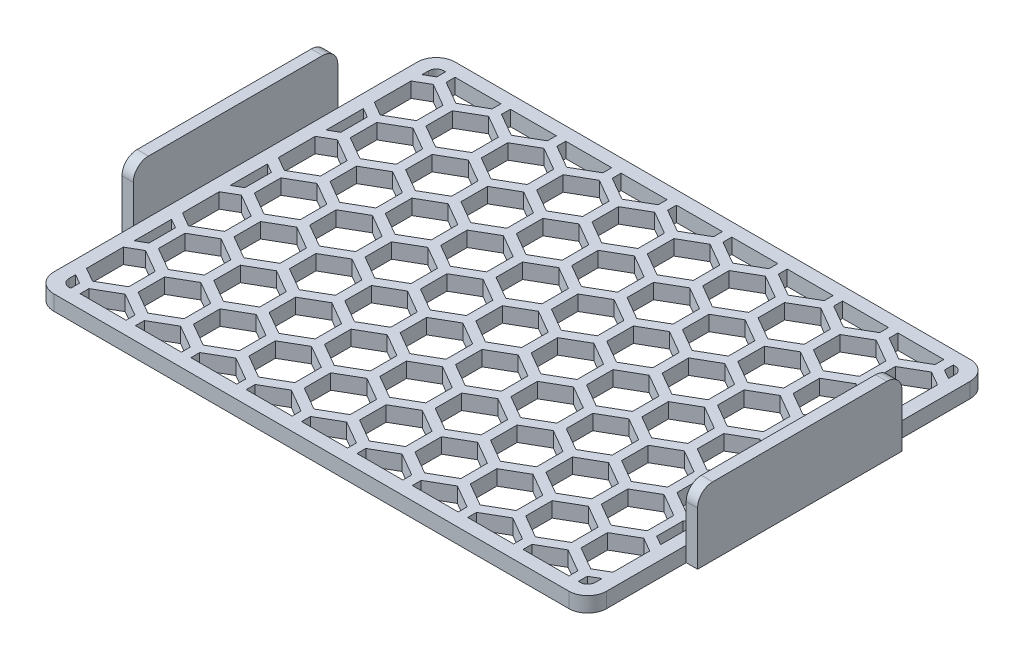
SolidWorks part; units mm, degrees
ref_plane "Front Plane" through (0, 0, 0) normal (0, 0, 1) x (1, 0, 0)
ref_plane "Top Plane" through (0, 0, 0) normal (0, 1, 0) x (1, 0, 0)
ref_plane "Right Plane" through (0, 0, 0) normal (1, 0, 0) x (0, 0, -1)
sketch "Sketch1" plane through (0, 0, 0) normal (0, 1, 0) x (1, 0, 0)
  line L0 (0, 7) -> (0, -23.7638) construction
  line L7 (0, 7) -> (-6.0622, 3.5)
  line L8 (-6.0622, 3.5) -> (-6.0622, -3.5)
  line L9 (-6.0622, -3.5) -> (0, -7)
  line L10 (0, -7) -> (6.0622, -3.5)
  line L11 (6.0622, -3.5) -> (6.0622, 3.5)
  line L12 (6.0622, 3.5) -> (0, 7)
  line L19 (13.3744, -9.1651) -> (7.3122, -5.6651)
  line L20 (7.3122, -5.6651) -> (1.25, -9.1651)
  line L21 (1.25, -9.1651) -> (1.25, -16.1651)
  line L22 (1.25, -16.1651) -> (7.3122, -19.6651)
  line L23 (7.3122, -19.6651) -> (13.3744, -16.1651)
  line L24 (13.3744, -16.1651) -> (13.3744, -9.1651)
  line L25 (14.62, 7) -> (8.5578, 3.5)
  line L26 (8.5578, -3.5) -> (14.62, -7)
  line L27 (8.5578, 3.5) -> (8.5578, -3.5)
  line L28 (20.6822, 3.5) -> (14.62, 7)
  line L29 (20.6822, -3.5) -> (20.6822, 3.5)
  line L30 (21.9322, -5.6651) -> (15.87, -9.1651)
  line L31 (27.9944, -9.1651) -> (21.9322, -5.6651)
  line L32 (27.9944, -16.1651) -> (27.9944, -9.1651)
  line L33 (21.9322, -19.6651) -> (27.9944, -16.1651)
  line L34 (15.87, -16.1651) -> (21.9322, -19.6651)
  line L35 (15.87, -9.1651) -> (15.87, -16.1651)
  line L36 (14.62, -7) -> (20.6822, -3.5)
  line L37 (29.24, 7) -> (23.1778, 3.5)
  line L38 (23.1778, -3.5) -> (29.24, -7)
  line L39 (23.1778, 3.5) -> (23.1778, -3.5)
  line L40 (35.3022, 3.5) -> (29.24, 7)
  line L41 (35.3022, -3.5) -> (35.3022, 3.5)
  line L42 (36.5522, -5.6651) -> (30.49, -9.1651)
  line L43 (42.6144, -9.1651) -> (36.5522, -5.6651)
  line L44 (42.6144, -16.1651) -> (42.6144, -9.1651)
  line L45 (36.5522, -19.6651) -> (42.6144, -16.1651)
  line L46 (30.49, -16.1651) -> (36.5522, -19.6651)
  line L47 (30.49, -9.1651) -> (30.49, -16.1651)
  line L48 (29.24, -7) -> (35.3022, -3.5)
  line L49 (43.86, 7) -> (37.7978, 3.5)
  line L50 (37.7978, -3.5) -> (43.86, -7)
  line L51 (37.7978, 3.5) -> (37.7978, -3.5)
  line L52 (49.9222, 3.5) -> (43.86, 7)
  line L53 (49.9222, -3.5) -> (49.9222, 3.5)
  line L54 (51.1722, -5.6651) -> (45.11, -9.1651)
  line L55 (57.2344, -9.1651) -> (51.1722, -5.6651)
  line L56 (57.2344, -16.1651) -> (57.2344, -9.1651)
  line L57 (51.1722, -19.6651) -> (57.2344, -16.1651)
  line L58 (45.11, -16.1651) -> (51.1722, -19.6651)
  line L59 (45.11, -9.1651) -> (45.11, -16.1651)
  line L60 (43.86, -7) -> (49.9222, -3.5)
  line L61 (14.62, -18.3301) -> (8.5578, -21.8301)
  line L62 (8.5578, -28.8301) -> (14.62, -32.3301)
  line L63 (8.5578, -21.8301) -> (8.5578, -28.8301)
  line L64 (20.6822, -21.8301) -> (14.62, -18.3301)
  line L65 (20.6822, -28.8301) -> (20.6822, -21.8301)
  line L66 (21.9322, -30.9952) -> (15.87, -34.4952)
  line L67 (27.9944, -34.4952) -> (21.9322, -30.9952)
  line L68 (27.9944, -41.4952) -> (27.9944, -34.4952)
  line L69 (21.9322, -44.9952) -> (27.9944, -41.4952)
  line L70 (15.87, -41.4952) -> (21.9322, -44.9952)
  line L71 (15.87, -34.4952) -> (15.87, -41.4952)
  line L72 (14.62, -32.3301) -> (20.6822, -28.8301)
  line L73 (29.24, -18.3301) -> (23.1778, -21.8301)
  line L74 (23.1778, -28.8301) -> (29.24, -32.3301)
  line L75 (23.1778, -21.8301) -> (23.1778, -28.8301)
  line L76 (35.3022, -21.8301) -> (29.24, -18.3301)
  line L77 (35.3022, -28.8301) -> (35.3022, -21.8301)
  line L78 (36.5522, -30.9952) -> (30.49, -34.4952)
  line L79 (42.6144, -34.4952) -> (36.5522, -30.9952)
  line L80 (42.6144, -41.4952) -> (42.6144, -34.4952)
  line L81 (36.5522, -44.9952) -> (42.6144, -41.4952)
  line L82 (30.49, -41.4952) -> (36.5522, -44.9952)
  line L83 (30.49, -34.4952) -> (30.49, -41.4952)
  line L84 (29.24, -32.3301) -> (35.3022, -28.8301)
  line L85 (43.86, -18.3301) -> (37.7978, -21.8301)
  line L86 (37.7978, -28.8301) -> (43.86, -32.3301)
  line L87 (37.7978, -21.8301) -> (37.7978, -28.8301)
  line L88 (49.9222, -21.8301) -> (43.86, -18.3301)
  line L89 (49.9222, -28.8301) -> (49.9222, -21.8301)
  line L90 (51.1722, -30.9952) -> (45.11, -34.4952)
  line L91 (57.2344, -34.4952) -> (51.1722, -30.9952)
  line L92 (57.2344, -41.4952) -> (57.2344, -34.4952)
  line L93 (51.1722, -44.9952) -> (57.2344, -41.4952)
  line L94 (45.11, -41.4952) -> (51.1722, -44.9952)
  line L95 (45.11, -34.4952) -> (45.11, -41.4952)
  line L96 (43.86, -32.3301) -> (49.9222, -28.8301)
  line L97 (14.62, -43.6603) -> (8.5578, -47.1603)
  line L98 (8.5578, -54.1603) -> (14.62, -57.6603)
  line L99 (8.5578, -47.1603) -> (8.5578, -54.1603)
  line L100 (20.6822, -47.1603) -> (14.62, -43.6603)
  line L101 (20.6822, -54.1603) -> (20.6822, -47.1603)
  line L102 (21.9322, -56.3253) -> (15.87, -59.8253)
  line L103 (27.9944, -59.8253) -> (21.9322, -56.3253)
  line L104 (27.9944, -66.8253) -> (27.9944, -59.8253)
  line L105 (21.9322, -70.3253) -> (27.9944, -66.8253)
  line L106 (15.87, -66.8253) -> (21.9322, -70.3253)
  line L107 (15.87, -59.8253) -> (15.87, -66.8253)
  line L108 (14.62, -57.6603) -> (20.6822, -54.1603)
  line L109 (29.24, -43.6603) -> (23.1778, -47.1603)
  line L110 (23.1778, -54.1603) -> (29.24, -57.6603)
  line L111 (23.1778, -47.1603) -> (23.1778, -54.1603)
  line L112 (35.3022, -47.1603) -> (29.24, -43.6603)
  line L113 (35.3022, -54.1603) -> (35.3022, -47.1603)
  line L114 (36.5522, -56.3253) -> (30.49, -59.8253)
  line L115 (42.6144, -59.8253) -> (36.5522, -56.3253)
  line L116 (42.6144, -66.8253) -> (42.6144, -59.8253)
  line L117 (36.5522, -70.3253) -> (42.6144, -66.8253)
  line L118 (30.49, -66.8253) -> (36.5522, -70.3253)
  line L119 (30.49, -59.8253) -> (30.49, -66.8253)
  line L120 (29.24, -57.6603) -> (35.3022, -54.1603)
  line L121 (43.86, -43.6603) -> (37.7978, -47.1603)
  line L122 (37.7978, -54.1603) -> (43.86, -57.6603)
  line L123 (37.7978, -47.1603) -> (37.7978, -54.1603)
  line L124 (49.9222, -47.1603) -> (43.86, -43.6603)
  line L125 (49.9222, -54.1603) -> (49.9222, -47.1603)
  line L126 (51.1722, -56.3253) -> (45.11, -59.8253)
  line L127 (57.2344, -59.8253) -> (51.1722, -56.3253)
  line L128 (57.2344, -66.8253) -> (57.2344, -59.8253)
  line L129 (51.1722, -70.3253) -> (57.2344, -66.8253)
  line L130 (45.11, -66.8253) -> (51.1722, -70.3253)
  line L131 (45.11, -59.8253) -> (45.11, -66.8253)
  line L132 (43.86, -57.6603) -> (49.9222, -54.1603)
  line L133 (0, -18.3301) -> (-6.0622, -21.8301)
  line L134 (-6.0622, -28.8301) -> (0, -32.3301)
  line L135 (-6.0622, -21.8301) -> (-6.0622, -28.8301)
  line L136 (6.0622, -21.8301) -> (0, -18.3301)
  line L137 (6.0622, -28.8301) -> (6.0622, -21.8301)
  line L138 (7.3122, -30.9952) -> (1.25, -34.4952)
  line L139 (13.3744, -34.4952) -> (7.3122, -30.9952)
  line L140 (13.3744, -41.4952) -> (13.3744, -34.4952)
  line L141 (7.3122, -44.9952) -> (13.3744, -41.4952)
  line L142 (1.25, -41.4952) -> (7.3122, -44.9952)
  line L143 (1.25, -34.4952) -> (1.25, -41.4952)
  line L144 (0, -32.3301) -> (6.0622, -28.8301)
  line L145 (0, -43.6603) -> (-6.0622, -47.1603)
  line L146 (-6.0622, -54.1603) -> (0, -57.6603)
  line L147 (-6.0622, -47.1603) -> (-6.0622, -54.1603)
  line L148 (6.0622, -47.1603) -> (0, -43.6603)
  line L149 (6.0622, -54.1603) -> (6.0622, -47.1603)
  line L150 (7.3122, -56.3253) -> (1.25, -59.8253)
  line L151 (13.3744, -59.8253) -> (7.3122, -56.3253)
  line L152 (13.3744, -66.8253) -> (13.3744, -59.8253)
  line L153 (7.3122, -70.3253) -> (13.3744, -66.8253)
  line L154 (1.25, -66.8253) -> (7.3122, -70.3253)
  line L155 (1.25, -59.8253) -> (1.25, -66.8253)
  line L156 (0, -57.6603) -> (6.0622, -54.1603)
  line L157 (-14.62, 7) -> (-20.6822, 3.5)
  line L158 (-8.5578, 3.5) -> (-14.62, 7)
  line L159 (-20.6822, 3.5) -> (-20.6822, -3.5)
  line L160 (-20.6822, -3.5) -> (-14.62, -7)
  line L161 (-14.62, -7) -> (-8.5578, -3.5)
  line L162 (-8.5578, -3.5) -> (-8.5578, 3.5)
  line L163 (-1.2456, -9.1651) -> (-7.3078, -5.6651)
  line L164 (-1.2456, -16.1651) -> (-1.2456, -9.1651)
  line L165 (-7.3078, -19.6651) -> (-1.2456, -16.1651)
  line L166 (-13.37, -16.1651) -> (-7.3078, -19.6651)
  line L167 (-13.37, -9.1651) -> (-13.37, -16.1651)
  line L168 (-7.3078, -5.6651) -> (-13.37, -9.1651)
  line L169 (-29.24, 7) -> (-35.3022, 3.5)
  line L170 (-23.1778, 3.5) -> (-29.24, 7)
  line L171 (-35.3022, 3.5) -> (-35.3022, -3.5)
  line L172 (-35.3022, -3.5) -> (-29.24, -7)
  line L173 (-29.24, -7) -> (-23.1778, -3.5)
  line L174 (-23.1778, -3.5) -> (-23.1778, 3.5)
  line L175 (-15.8656, -9.1651) -> (-21.9278, -5.6651)
  line L176 (-15.8656, -16.1651) -> (-15.8656, -9.1651)
  line L177 (-21.9278, -19.6651) -> (-15.8656, -16.1651)
  line L178 (-27.99, -16.1651) -> (-21.9278, -19.6651)
  line L179 (-27.99, -9.1651) -> (-27.99, -16.1651)
  line L180 (-21.9278, -5.6651) -> (-27.99, -9.1651)
  line L181 (-43.86, 7) -> (-49.9222, 3.5)
  line L182 (-37.7978, 3.5) -> (-43.86, 7)
  line L183 (-49.9222, 3.5) -> (-49.9222, -3.5)
  line L184 (-49.9222, -3.5) -> (-43.86, -7)
  line L185 (-43.86, -7) -> (-37.7978, -3.5)
  line L186 (-37.7978, -3.5) -> (-37.7978, 3.5)
  line L187 (-30.4856, -9.1651) -> (-36.5478, -5.6651)
  line L188 (-30.4856, -16.1651) -> (-30.4856, -9.1651)
  line L189 (-36.5478, -19.6651) -> (-30.4856, -16.1651)
  line L190 (-42.61, -16.1651) -> (-36.5478, -19.6651)
  line L191 (-42.61, -9.1651) -> (-42.61, -16.1651)
  line L192 (-36.5478, -5.6651) -> (-42.61, -9.1651)
  line L193 (-58.48, 7) -> (-64.5422, 3.5)
  line L194 (-52.4178, 3.5) -> (-58.48, 7)
  line L195 (-64.5422, 3.5) -> (-64.5422, -3.5)
  line L196 (-64.5422, -3.5) -> (-58.48, -7)
  line L197 (-58.48, -7) -> (-52.4178, -3.5)
  line L198 (-52.4178, -3.5) -> (-52.4178, 3.5)
  line L199 (-45.1056, -9.1651) -> (-51.1678, -5.6651)
  line L200 (-45.1056, -16.1651) -> (-45.1056, -9.1651)
  line L201 (-51.1678, -19.6651) -> (-45.1056, -16.1651)
  line L202 (-57.23, -16.1651) -> (-51.1678, -19.6651)
  line L203 (-57.23, -9.1651) -> (-57.23, -16.1651)
  line L204 (-51.1678, -5.6651) -> (-57.23, -9.1651)
  line L205 (-14.62, -18.33) -> (-20.6822, -21.83)
  line L206 (-8.5578, -21.83) -> (-14.62, -18.33)
  line L207 (-20.6822, -21.83) -> (-20.6822, -28.83)
  line L208 (-20.6822, -28.83) -> (-14.62, -32.33)
  line L209 (-14.62, -32.33) -> (-8.5578, -28.83)
  line L210 (-8.5578, -28.83) -> (-8.5578, -21.83)
  line L211 (-1.2456, -34.4951) -> (-7.3078, -30.9951)
  line L212 (-1.2456, -41.4951) -> (-1.2456, -34.4951)
  line L213 (-7.3078, -44.9951) -> (-1.2456, -41.4951)
  line L214 (-13.37, -41.4951) -> (-7.3078, -44.9951)
  line L215 (-13.37, -34.4951) -> (-13.37, -41.4951)
  line L216 (-7.3078, -30.9951) -> (-13.37, -34.4951)
  line L217 (-29.24, -18.33) -> (-35.3022, -21.83)
  line L218 (-23.1778, -21.83) -> (-29.24, -18.33)
  line L219 (-35.3022, -21.83) -> (-35.3022, -28.83)
  line L220 (-35.3022, -28.83) -> (-29.24, -32.33)
  line L221 (-29.24, -32.33) -> (-23.1778, -28.83)
  line L222 (-23.1778, -28.83) -> (-23.1778, -21.83)
  line L223 (-15.8656, -34.4951) -> (-21.9278, -30.9951)
  line L224 (-15.8656, -41.4951) -> (-15.8656, -34.4951)
  line L225 (-21.9278, -44.9951) -> (-15.8656, -41.4951)
  line L226 (-27.99, -41.4951) -> (-21.9278, -44.9951)
  line L227 (-27.99, -34.4951) -> (-27.99, -41.4951)
  line L228 (-21.9278, -30.9951) -> (-27.99, -34.4951)
  line L229 (-43.86, -18.33) -> (-49.9222, -21.83)
  line L230 (-37.7978, -21.83) -> (-43.86, -18.33)
  line L231 (-49.9222, -21.83) -> (-49.9222, -28.83)
  line L232 (-49.9222, -28.83) -> (-43.86, -32.33)
  line L233 (-43.86, -32.33) -> (-37.7978, -28.83)
  line L234 (-37.7978, -28.83) -> (-37.7978, -21.83)
  line L235 (-30.4856, -34.4951) -> (-36.5478, -30.9951)
  line L236 (-30.4856, -41.4951) -> (-30.4856, -34.4951)
  line L237 (-36.5478, -44.9951) -> (-30.4856, -41.4951)
  line L238 (-42.61, -41.4951) -> (-36.5478, -44.9951)
  line L239 (-42.61, -34.4951) -> (-42.61, -41.4951)
  line L240 (-36.5478, -30.9951) -> (-42.61, -34.4951)
  line L241 (-58.48, -18.33) -> (-64.5422, -21.83)
  line L242 (-52.4178, -21.83) -> (-58.48, -18.33)
  line L243 (-64.5422, -21.83) -> (-64.5422, -28.83)
  line L244 (-64.5422, -28.83) -> (-58.48, -32.33)
  line L245 (-58.48, -32.33) -> (-52.4178, -28.83)
  line L246 (-52.4178, -28.83) -> (-52.4178, -21.83)
  line L247 (-45.1056, -34.4951) -> (-51.1678, -30.9951)
  line L248 (-45.1056, -41.4951) -> (-45.1056, -34.4951)
  line L249 (-51.1678, -44.9951) -> (-45.1056, -41.4951)
  line L250 (-57.23, -41.4951) -> (-51.1678, -44.9951)
  line L251 (-57.23, -34.4951) -> (-57.23, -41.4951)
  line L252 (-51.1678, -30.9951) -> (-57.23, -34.4951)
  line L253 (-14.62, -43.66) -> (-20.6822, -47.16)
  line L254 (-8.5578, -47.16) -> (-14.62, -43.66)
  line L255 (-20.6822, -47.16) -> (-20.6822, -54.16)
  line L256 (-20.6822, -54.16) -> (-14.62, -57.66)
  line L257 (-14.62, -57.66) -> (-8.5578, -54.16)
  line L258 (-8.5578, -54.16) -> (-8.5578, -47.16)
  line L259 (-1.2456, -59.8251) -> (-7.3078, -56.3251)
  line L260 (-1.2456, -66.8251) -> (-1.2456, -59.8251)
  line L261 (-7.3078, -70.3251) -> (-1.2456, -66.8251)
  line L262 (-13.37, -66.8251) -> (-7.3078, -70.3251)
  line L263 (-13.37, -59.8251) -> (-13.37, -66.8251)
  line L264 (-7.3078, -56.3251) -> (-13.37, -59.8251)
  line L265 (-29.24, -43.66) -> (-35.3022, -47.16)
  line L266 (-23.1778, -47.16) -> (-29.24, -43.66)
  line L267 (-35.3022, -47.16) -> (-35.3022, -54.16)
  line L268 (-35.3022, -54.16) -> (-29.24, -57.66)
  line L269 (-29.24, -57.66) -> (-23.1778, -54.16)
  line L270 (-23.1778, -54.16) -> (-23.1778, -47.16)
  line L271 (-15.8656, -59.8251) -> (-21.9278, -56.3251)
  line L272 (-15.8656, -66.8251) -> (-15.8656, -59.8251)
  line L273 (-21.9278, -70.3251) -> (-15.8656, -66.8251)
  line L274 (-27.99, -66.8251) -> (-21.9278, -70.3251)
  line L275 (-27.99, -59.8251) -> (-27.99, -66.8251)
  line L276 (-21.9278, -56.3251) -> (-27.99, -59.8251)
  line L277 (-43.86, -43.66) -> (-49.9222, -47.16)
  line L278 (-37.7978, -47.16) -> (-43.86, -43.66)
  line L279 (-49.9222, -47.16) -> (-49.9222, -54.16)
  line L280 (-49.9222, -54.16) -> (-43.86, -57.66)
  line L281 (-43.86, -57.66) -> (-37.7978, -54.16)
  line L282 (-37.7978, -54.16) -> (-37.7978, -47.16)
  line L283 (-30.4856, -59.8251) -> (-36.5478, -56.3251)
  line L284 (-30.4856, -66.8251) -> (-30.4856, -59.8251)
  line L285 (-36.5478, -70.3251) -> (-30.4856, -66.8251)
  line L286 (-42.61, -66.8251) -> (-36.5478, -70.3251)
  line L287 (-42.61, -59.8251) -> (-42.61, -66.8251)
  line L288 (-36.5478, -56.3251) -> (-42.61, -59.8251)
  line L289 (-58.48, -43.66) -> (-64.5422, -47.16)
  line L290 (-52.4178, -47.16) -> (-58.48, -43.66)
  line L291 (-64.5422, -47.16) -> (-64.5422, -54.16)
  line L292 (-64.5422, -54.16) -> (-58.48, -57.66)
  line L293 (-58.48, -57.66) -> (-52.4178, -54.16)
  line L294 (-52.4178, -54.16) -> (-52.4178, -47.16)
  line L295 (-45.1056, -59.8251) -> (-51.1678, -56.3251)
  line L296 (-45.1056, -66.8251) -> (-45.1056, -59.8251)
  line L297 (-51.1678, -70.3251) -> (-45.1056, -66.8251)
  line L298 (-57.23, -66.8251) -> (-51.1678, -70.3251)
  line L299 (-57.23, -59.8251) -> (-57.23, -66.8251)
  line L300 (-51.1678, -56.3251) -> (-57.23, -59.8251)
  line L301 (0, -18.33) -> (-6.0622, -21.83)
  line L302 (6.0622, -21.83) -> (0, -18.33)
  line L303 (-6.0622, -21.83) -> (-6.0622, -28.83)
  line L304 (-6.0622, -28.83) -> (0, -32.33)
  line L305 (0, -32.33) -> (6.0622, -28.83)
  line L306 (6.0622, -28.83) -> (6.0622, -21.83)
  line L307 (13.3744, -34.4951) -> (7.3122, -30.9951)
  line L308 (13.3744, -41.4951) -> (13.3744, -34.4951)
  line L309 (7.3122, -44.9951) -> (13.3744, -41.4951)
  line L310 (1.25, -41.4951) -> (7.3122, -44.9951)
  line L311 (1.25, -34.4951) -> (1.25, -41.4951)
  line L312 (7.3122, -30.9951) -> (1.25, -34.4951)
  line L313 (0, -43.66) -> (-6.0622, -47.16)
  line L314 (6.0622, -47.16) -> (0, -43.66)
  line L315 (-6.0622, -47.16) -> (-6.0622, -54.16)
  line L316 (-6.0622, -54.16) -> (0, -57.66)
  line L317 (0, -57.66) -> (6.0622, -54.16)
  line L318 (6.0622, -54.16) -> (6.0622, -47.16)
  line L319 (13.3744, -59.8251) -> (7.3122, -56.3251)
  line L320 (13.3744, -66.8251) -> (13.3744, -59.8251)
  line L321 (7.3122, -70.3251) -> (13.3744, -66.8251)
  line L322 (1.25, -66.8251) -> (7.3122, -70.3251)
  line L323 (1.25, -59.8251) -> (1.25, -66.8251)
  line L324 (7.3122, -56.3251) -> (1.25, -59.8251)
  line L325 (14.62, 7) -> (8.5578, 3.5)
  line L326 (20.6822, 3.5) -> (14.62, 7)
  line L327 (8.5578, 3.5) -> (8.5578, -3.5)
  line L328 (8.5578, -3.5) -> (14.62, -7)
  line L329 (14.62, -7) -> (20.6822, -3.5)
  line L330 (20.6822, -3.5) -> (20.6822, 3.5)
  line L331 (27.9944, -9.1651) -> (21.9322, -5.6651)
  line L332 (27.9944, -16.1651) -> (27.9944, -9.1651)
  line L333 (21.9322, -19.6651) -> (27.9944, -16.1651)
  line L334 (15.87, -16.1651) -> (21.9322, -19.6651)
  line L335 (15.87, -9.1651) -> (15.87, -16.1651)
  line L336 (21.9322, -5.6651) -> (15.87, -9.1651)
  line L337 (29.24, 7) -> (23.1778, 3.5)
  line L338 (35.3022, 3.5) -> (29.24, 7)
  line L339 (23.1778, 3.5) -> (23.1778, -3.5)
  line L340 (23.1778, -3.5) -> (29.24, -7)
  line L341 (29.24, -7) -> (35.3022, -3.5)
  line L342 (35.3022, -3.5) -> (35.3022, 3.5)
  line L343 (42.6144, -9.1651) -> (36.5522, -5.6651)
  line L344 (42.6144, -16.1651) -> (42.6144, -9.1651)
  line L345 (36.5522, -19.6651) -> (42.6144, -16.1651)
  line L346 (30.49, -16.1651) -> (36.5522, -19.6651)
  line L347 (30.49, -9.1651) -> (30.49, -16.1651)
  line L348 (36.5522, -5.6651) -> (30.49, -9.1651)
  line L349 (43.86, 7) -> (37.7978, 3.5)
  line L350 (49.9222, 3.5) -> (43.86, 7)
  line L351 (37.7978, 3.5) -> (37.7978, -3.5)
  line L352 (37.7978, -3.5) -> (43.86, -7)
  line L353 (43.86, -7) -> (49.9222, -3.5)
  line L354 (49.9222, -3.5) -> (49.9222, 3.5)
  line L355 (57.2344, -9.1651) -> (51.1722, -5.6651)
  line L356 (57.2344, -16.1651) -> (57.2344, -9.1651)
  line L357 (51.1722, -19.6651) -> (57.2344, -16.1651)
  line L358 (45.11, -16.1651) -> (51.1722, -19.6651)
  line L359 (45.11, -9.1651) -> (45.11, -16.1651)
  line L360 (51.1722, -5.6651) -> (45.11, -9.1651)
  line L361 (14.62, 32.33) -> (8.5578, 28.83)
  line L362 (20.6822, 28.83) -> (14.62, 32.33)
  line L363 (8.5578, 28.83) -> (8.5578, 21.83)
  line L364 (8.5578, 21.83) -> (14.62, 18.33)
  line L365 (14.62, 18.33) -> (20.6822, 21.83)
  line L366 (20.6822, 21.83) -> (20.6822, 28.83)
  line L367 (27.9944, 16.1649) -> (21.9322, 19.6649)
  line L368 (27.9944, 9.1649) -> (27.9944, 16.1649)
  line L369 (21.9322, 5.6649) -> (27.9944, 9.1649)
  line L370 (15.87, 9.1649) -> (21.9322, 5.6649)
  line L371 (15.87, 16.1649) -> (15.87, 9.1649)
  line L372 (21.9322, 19.6649) -> (15.87, 16.1649)
  line L373 (29.24, 32.33) -> (23.1778, 28.83)
  line L374 (35.3022, 28.83) -> (29.24, 32.33)
  line L375 (23.1778, 28.83) -> (23.1778, 21.83)
  line L376 (23.1778, 21.83) -> (29.24, 18.33)
  line L377 (29.24, 18.33) -> (35.3022, 21.83)
  line L378 (35.3022, 21.83) -> (35.3022, 28.83)
  line L379 (42.6144, 16.1649) -> (36.5522, 19.6649)
  line L380 (42.6144, 9.1649) -> (42.6144, 16.1649)
  line L381 (36.5522, 5.6649) -> (42.6144, 9.1649)
  line L382 (30.49, 9.1649) -> (36.5522, 5.6649)
  line L383 (30.49, 16.1649) -> (30.49, 9.1649)
  line L384 (36.5522, 19.6649) -> (30.49, 16.1649)
  line L385 (43.86, 32.33) -> (37.7978, 28.83)
  line L386 (49.9222, 28.83) -> (43.86, 32.33)
  line L387 (37.7978, 28.83) -> (37.7978, 21.83)
  line L388 (37.7978, 21.83) -> (43.86, 18.33)
  line L389 (43.86, 18.33) -> (49.9222, 21.83)
  line L390 (49.9222, 21.83) -> (49.9222, 28.83)
  line L391 (57.2344, 16.1649) -> (51.1722, 19.6649)
  line L392 (57.2344, 9.1649) -> (57.2344, 16.1649)
  line L393 (51.1722, 5.6649) -> (57.2344, 9.1649)
  line L394 (45.11, 9.1649) -> (51.1722, 5.6649)
  line L395 (45.11, 16.1649) -> (45.11, 9.1649)
  line L396 (51.1722, 19.6649) -> (45.11, 16.1649)
  line L397 (14.62, 57.66) -> (8.5578, 54.16)
  line L398 (20.6822, 54.16) -> (14.62, 57.66)
  line L399 (8.5578, 54.16) -> (8.5578, 47.16)
  line L400 (8.5578, 47.16) -> (14.62, 43.66)
  line L401 (14.62, 43.66) -> (20.6822, 47.16)
  line L402 (20.6822, 47.16) -> (20.6822, 54.16)
  line L403 (27.9944, 41.4949) -> (21.9322, 44.9949)
  line L404 (27.9944, 34.4949) -> (27.9944, 41.4949)
  line L405 (21.9322, 30.9949) -> (27.9944, 34.4949)
  line L406 (15.87, 34.4949) -> (21.9322, 30.9949)
  line L407 (15.87, 41.4949) -> (15.87, 34.4949)
  line L408 (21.9322, 44.9949) -> (15.87, 41.4949)
  line L409 (29.24, 57.66) -> (23.1778, 54.16)
  line L410 (35.3022, 54.16) -> (29.24, 57.66)
  line L411 (23.1778, 54.16) -> (23.1778, 47.16)
  line L412 (23.1778, 47.16) -> (29.24, 43.66)
  line L413 (29.24, 43.66) -> (35.3022, 47.16)
  line L414 (35.3022, 47.16) -> (35.3022, 54.16)
  line L415 (42.6144, 41.4949) -> (36.5522, 44.9949)
  line L416 (42.6144, 34.4949) -> (42.6144, 41.4949)
  line L417 (36.5522, 30.9949) -> (42.6144, 34.4949)
  line L418 (30.49, 34.4949) -> (36.5522, 30.9949)
  line L419 (30.49, 41.4949) -> (30.49, 34.4949)
  line L420 (36.5522, 44.9949) -> (30.49, 41.4949)
  line L421 (43.86, 57.66) -> (37.7978, 54.16)
  line L422 (49.9222, 54.16) -> (43.86, 57.66)
  line L423 (37.7978, 54.16) -> (37.7978, 47.16)
  line L424 (37.7978, 47.16) -> (43.86, 43.66)
  line L425 (43.86, 43.66) -> (49.9222, 47.16)
  line L426 (49.9222, 47.16) -> (49.9222, 54.16)
  line L427 (57.2344, 41.4949) -> (51.1722, 44.9949)
  line L428 (57.2344, 34.4949) -> (57.2344, 41.4949)
  line L429 (51.1722, 30.9949) -> (57.2344, 34.4949)
  line L430 (45.11, 34.4949) -> (51.1722, 30.9949)
  line L431 (45.11, 41.4949) -> (45.11, 34.4949)
  line L432 (51.1722, 44.9949) -> (45.11, 41.4949)
  line L433 (14.62, 82.99) -> (8.5578, 79.49)
  line L434 (20.6822, 79.49) -> (14.62, 82.99)
  line L435 (8.5578, 79.49) -> (8.5578, 72.49)
  line L437 (14.62, 68.99) -> (20.6822, 72.49)
  line L439 (27.9944, 66.8249) -> (21.9322, 70.3249)
  line L440 (27.9944, 59.8249) -> (27.9944, 66.8249)
  line L441 (21.9322, 56.3249) -> (27.9944, 59.8249)
  line L442 (15.87, 59.8249) -> (21.9322, 56.3249)
  line L443 (15.87, 66.8249) -> (15.87, 59.8249)
  line L444 (21.9322, 70.3249) -> (15.87, 66.8249)
  line L445 (29.24, 82.99) -> (23.1778, 79.49)
  line L446 (35.3022, 79.49) -> (29.24, 82.99)
  line L448 (23.1778, 72.49) -> (29.24, 68.99)
  line L449 (29.24, 68.99) -> (35.3022, 72.49)
  line L451 (42.6144, 66.8249) -> (36.5522, 70.3249)
  line L452 (42.6144, 59.8249) -> (42.6144, 66.8249)
  line L453 (36.5522, 56.3249) -> (42.6144, 59.8249)
  line L454 (30.49, 59.8249) -> (36.5522, 56.3249)
  line L455 (30.49, 66.8249) -> (30.49, 59.8249)
  line L456 (36.5522, 70.3249) -> (30.49, 66.8249)
  line L457 (43.86, 82.99) -> (37.7978, 79.49)
  line L458 (49.9222, 79.49) -> (43.86, 82.99)
  line L460 (37.7978, 72.49) -> (43.86, 68.99)
  line L461 (43.86, 68.99) -> (49.9222, 72.49)
  line L463 (57.2344, 66.8249) -> (51.1722, 70.3249)
  line L464 (57.2344, 59.8249) -> (57.2344, 66.8249)
  line L465 (51.1722, 56.3249) -> (57.2344, 59.8249)
  line L466 (45.11, 59.8249) -> (51.1722, 56.3249)
  line L467 (45.11, 66.8249) -> (45.11, 59.8249)
  line L468 (51.1722, 70.3249) -> (45.11, 66.8249)
  line L469 (0, 32.33) -> (-6.0622, 28.83)
  line L470 (6.0622, 28.83) -> (0, 32.33)
  line L471 (-6.0622, 28.83) -> (-6.0622, 21.83)
  line L472 (-6.0622, 21.83) -> (0, 18.33)
  line L473 (0, 18.33) -> (6.0622, 21.83)
  line L474 (6.0622, 21.83) -> (6.0622, 28.83)
  line L475 (13.3744, 16.1649) -> (7.3122, 19.6649)
  line L476 (13.3744, 9.1649) -> (13.3744, 16.1649)
  line L477 (7.3122, 5.6649) -> (13.3744, 9.1649)
  line L478 (1.25, 9.1649) -> (7.3122, 5.6649)
  line L479 (1.25, 16.1649) -> (1.25, 9.1649)
  line L480 (7.3122, 19.6649) -> (1.25, 16.1649)
  line L481 (0, 57.66) -> (-6.0622, 54.16)
  line L482 (6.0622, 54.16) -> (0, 57.66)
  line L483 (-6.0622, 54.16) -> (-6.0622, 47.16)
  line L484 (-6.0622, 47.16) -> (0, 43.66)
  line L485 (0, 43.66) -> (6.0622, 47.16)
  line L486 (6.0622, 47.16) -> (6.0622, 54.16)
  line L487 (13.3744, 41.4949) -> (7.3122, 44.9949)
  line L488 (13.3744, 34.4949) -> (13.3744, 41.4949)
  line L489 (7.3122, 30.9949) -> (13.3744, 34.4949)
  line L490 (1.25, 34.4949) -> (7.3122, 30.9949)
  line L491 (1.25, 41.4949) -> (1.25, 34.4949)
  line L492 (7.3122, 44.9949) -> (1.25, 41.4949)
  line L493 (0, 82.99) -> (-6.0622, 79.49)
  line L494 (6.0622, 79.49) -> (0, 82.99)
  line L495 (-6.0622, 79.49) -> (-6.0622, 72.49)
  line L498 (6.0622, 72.49) -> (6.0622, 79.49)
  line L499 (13.3744, 66.8249) -> (7.3122, 70.3249)
  line L500 (13.3744, 59.8249) -> (13.3744, 66.8249)
  line L501 (7.3122, 56.3249) -> (13.3744, 59.8249)
  line L502 (1.25, 59.8249) -> (7.3122, 56.3249)
  line L503 (1.25, 66.8249) -> (1.25, 59.8249)
  line L504 (7.3122, 70.3249) -> (1.25, 66.8249)
  line L505 (-14.62, 7) -> (-20.6822, 3.5)
  line L506 (-8.5578, 3.5) -> (-14.62, 7)
  line L507 (-20.6822, 3.5) -> (-20.6822, -3.5)
  line L508 (-20.6822, -3.5) -> (-14.62, -7)
  line L509 (-14.62, -7) -> (-8.5578, -3.5)
  line L510 (-8.5578, -3.5) -> (-8.5578, 3.5)
  line L511 (-1.2456, -9.1651) -> (-7.3078, -5.6651)
  line L512 (-1.2456, -16.1651) -> (-1.2456, -9.1651)
  line L513 (-7.3078, -19.6651) -> (-1.2456, -16.1651)
  line L514 (-13.37, -16.1651) -> (-7.3078, -19.6651)
  line L515 (-13.37, -9.1651) -> (-13.37, -16.1651)
  line L516 (-7.3078, -5.6651) -> (-13.37, -9.1651)
  line L517 (-29.24, 7) -> (-35.3022, 3.5)
  line L518 (-23.1778, 3.5) -> (-29.24, 7)
  line L519 (-35.3022, 3.5) -> (-35.3022, -3.5)
  line L520 (-35.3022, -3.5) -> (-29.24, -7)
  line L521 (-29.24, -7) -> (-23.1778, -3.5)
  line L522 (-23.1778, -3.5) -> (-23.1778, 3.5)
  line L523 (-15.8656, -9.1651) -> (-21.9278, -5.6651)
  line L524 (-15.8656, -16.1651) -> (-15.8656, -9.1651)
  line L525 (-21.9278, -19.6651) -> (-15.8656, -16.1651)
  line L526 (-27.99, -16.1651) -> (-21.9278, -19.6651)
  line L527 (-27.99, -9.1651) -> (-27.99, -16.1651)
  line L528 (-21.9278, -5.6651) -> (-27.99, -9.1651)
  line L529 (-43.86, 7) -> (-49.9222, 3.5)
  line L530 (-37.7978, 3.5) -> (-43.86, 7)
  line L531 (-49.9222, 3.5) -> (-49.9222, -3.5)
  line L532 (-49.9222, -3.5) -> (-43.86, -7)
  line L533 (-43.86, -7) -> (-37.7978, -3.5)
  line L534 (-37.7978, -3.5) -> (-37.7978, 3.5)
  line L535 (-30.4856, -9.1651) -> (-36.5478, -5.6651)
  line L536 (-30.4856, -16.1651) -> (-30.4856, -9.1651)
  line L537 (-36.5478, -19.6651) -> (-30.4856, -16.1651)
  line L538 (-42.61, -16.1651) -> (-36.5478, -19.6651)
  line L539 (-42.61, -9.1651) -> (-42.61, -16.1651)
  line L540 (-36.5478, -5.6651) -> (-42.61, -9.1651)
  line L541 (-58.48, 7) -> (-64.5422, 3.5)
  line L542 (-52.4178, 3.5) -> (-58.48, 7)
  line L543 (-64.5422, 3.5) -> (-64.5422, -3.5)
  line L544 (-64.5422, -3.5) -> (-58.48, -7)
  line L545 (-58.48, -7) -> (-52.4178, -3.5)
  line L546 (-52.4178, -3.5) -> (-52.4178, 3.5)
  line L547 (-45.1056, -9.1651) -> (-51.1678, -5.6651)
  line L548 (-45.1056, -16.1651) -> (-45.1056, -9.1651)
  line L549 (-51.1678, -19.6651) -> (-45.1056, -16.1651)
  line L550 (-57.23, -16.1651) -> (-51.1678, -19.6651)
  line L551 (-57.23, -9.1651) -> (-57.23, -16.1651)
  line L552 (-51.1678, -5.6651) -> (-57.23, -9.1651)
  line L553 (-14.62, 32.33) -> (-20.6822, 28.83)
  line L554 (-8.5578, 28.83) -> (-14.62, 32.33)
  line L555 (-20.6822, 28.83) -> (-20.6822, 21.83)
  line L556 (-20.6822, 21.83) -> (-14.62, 18.33)
  line L557 (-14.62, 18.33) -> (-8.5578, 21.83)
  line L558 (-8.5578, 21.83) -> (-8.5578, 28.83)
  line L559 (-1.2456, 16.1649) -> (-7.3078, 19.6649)
  line L560 (-1.2456, 9.1649) -> (-1.2456, 16.1649)
  line L561 (-7.3078, 5.6649) -> (-1.2456, 9.1649)
  line L562 (-13.37, 9.1649) -> (-7.3078, 5.6649)
  line L563 (-13.37, 16.1649) -> (-13.37, 9.1649)
  line L564 (-7.3078, 19.6649) -> (-13.37, 16.1649)
  line L565 (-29.24, 32.33) -> (-35.3022, 28.83)
  line L566 (-23.1778, 28.83) -> (-29.24, 32.33)
  line L567 (-35.3022, 28.83) -> (-35.3022, 21.83)
  line L568 (-35.3022, 21.83) -> (-29.24, 18.33)
  line L569 (-29.24, 18.33) -> (-23.1778, 21.83)
  line L570 (-23.1778, 21.83) -> (-23.1778, 28.83)
  line L571 (-15.8656, 16.1649) -> (-21.9278, 19.6649)
  line L572 (-15.8656, 9.1649) -> (-15.8656, 16.1649)
  line L573 (-21.9278, 5.6649) -> (-15.8656, 9.1649)
  line L574 (-27.99, 9.1649) -> (-21.9278, 5.6649)
  line L575 (-27.99, 16.1649) -> (-27.99, 9.1649)
  line L576 (-21.9278, 19.6649) -> (-27.99, 16.1649)
  line L577 (-43.86, 32.33) -> (-49.9222, 28.83)
  line L578 (-37.7978, 28.83) -> (-43.86, 32.33)
  line L579 (-49.9222, 28.83) -> (-49.9222, 21.83)
  line L580 (-49.9222, 21.83) -> (-43.86, 18.33)
  line L581 (-43.86, 18.33) -> (-37.7978, 21.83)
  line L582 (-37.7978, 21.83) -> (-37.7978, 28.83)
  line L583 (-30.4856, 16.1649) -> (-36.5478, 19.6649)
  line L584 (-30.4856, 9.1649) -> (-30.4856, 16.1649)
  line L585 (-36.5478, 5.6649) -> (-30.4856, 9.1649)
  line L586 (-42.61, 9.1649) -> (-36.5478, 5.6649)
  line L587 (-42.61, 16.1649) -> (-42.61, 9.1649)
  line L588 (-36.5478, 19.6649) -> (-42.61, 16.1649)
  line L589 (-58.48, 32.33) -> (-64.5422, 28.83)
  line L590 (-52.4178, 28.83) -> (-58.48, 32.33)
  line L591 (-64.5422, 28.83) -> (-64.5422, 21.83)
  line L592 (-64.5422, 21.83) -> (-58.48, 18.33)
  line L593 (-58.48, 18.33) -> (-52.4178, 21.83)
  line L594 (-52.4178, 21.83) -> (-52.4178, 28.83)
  line L595 (-45.1056, 16.1649) -> (-51.1678, 19.6649)
  line L596 (-45.1056, 9.1649) -> (-45.1056, 16.1649)
  line L597 (-51.1678, 5.6649) -> (-45.1056, 9.1649)
  line L598 (-57.23, 9.1649) -> (-51.1678, 5.6649)
  line L599 (-57.23, 16.1649) -> (-57.23, 9.1649)
  line L600 (-51.1678, 19.6649) -> (-57.23, 16.1649)
  line L601 (-14.62, 57.66) -> (-20.6822, 54.16)
  line L602 (-8.5578, 54.16) -> (-14.62, 57.66)
  line L603 (-20.6822, 54.16) -> (-20.6822, 47.16)
  line L604 (-20.6822, 47.16) -> (-14.62, 43.66)
  line L605 (-14.62, 43.66) -> (-8.5578, 47.16)
  line L606 (-8.5578, 47.16) -> (-8.5578, 54.16)
  line L607 (-1.2456, 41.4949) -> (-7.3078, 44.9949)
  line L608 (-1.2456, 34.4949) -> (-1.2456, 41.4949)
  line L609 (-7.3078, 30.9949) -> (-1.2456, 34.4949)
  line L610 (-13.37, 34.4949) -> (-7.3078, 30.9949)
  line L611 (-13.37, 41.4949) -> (-13.37, 34.4949)
  line L612 (-7.3078, 44.9949) -> (-13.37, 41.4949)
  line L613 (-29.24, 57.66) -> (-35.3022, 54.16)
  line L614 (-23.1778, 54.16) -> (-29.24, 57.66)
  line L615 (-35.3022, 54.16) -> (-35.3022, 47.16)
  line L616 (-35.3022, 47.16) -> (-29.24, 43.66)
  line L617 (-29.24, 43.66) -> (-23.1778, 47.16)
  line L618 (-23.1778, 47.16) -> (-23.1778, 54.16)
  line L619 (-15.8656, 41.4949) -> (-21.9278, 44.9949)
  line L620 (-15.8656, 34.4949) -> (-15.8656, 41.4949)
  line L621 (-21.9278, 30.9949) -> (-15.8656, 34.4949)
  line L622 (-27.99, 34.4949) -> (-21.9278, 30.9949)
  line L623 (-27.99, 41.4949) -> (-27.99, 34.4949)
  line L624 (-21.9278, 44.9949) -> (-27.99, 41.4949)
  line L625 (-43.86, 57.66) -> (-49.9222, 54.16)
  line L626 (-37.7978, 54.16) -> (-43.86, 57.66)
  line L627 (-49.9222, 54.16) -> (-49.9222, 47.16)
  line L628 (-49.9222, 47.16) -> (-43.86, 43.66)
  line L629 (-43.86, 43.66) -> (-37.7978, 47.16)
  line L630 (-37.7978, 47.16) -> (-37.7978, 54.16)
  line L631 (-30.4856, 41.4949) -> (-36.5478, 44.9949)
  line L632 (-30.4856, 34.4949) -> (-30.4856, 41.4949)
  line L633 (-36.5478, 30.9949) -> (-30.4856, 34.4949)
  line L634 (-42.61, 34.4949) -> (-36.5478, 30.9949)
  line L635 (-42.61, 41.4949) -> (-42.61, 34.4949)
  line L636 (-36.5478, 44.9949) -> (-42.61, 41.4949)
  line L637 (-58.48, 57.66) -> (-64.5422, 54.16)
  line L638 (-52.4178, 54.16) -> (-58.48, 57.66)
  line L639 (-64.5422, 54.16) -> (-64.5422, 47.16)
  line L640 (-64.5422, 47.16) -> (-58.48, 43.66)
  line L641 (-58.48, 43.66) -> (-52.4178, 47.16)
  line L642 (-52.4178, 47.16) -> (-52.4178, 54.16)
  line L643 (-45.1056, 41.4949) -> (-51.1678, 44.9949)
  line L644 (-45.1056, 34.4949) -> (-45.1056, 41.4949)
  line L645 (-51.1678, 30.9949) -> (-45.1056, 34.4949)
  line L646 (-57.23, 34.4949) -> (-51.1678, 30.9949)
  line L647 (-57.23, 41.4949) -> (-57.23, 34.4949)
  line L648 (-51.1678, 44.9949) -> (-57.23, 41.4949)
  line L649 (-14.62, 82.99) -> (-20.6822, 79.49)
  line L650 (-8.5578, 79.49) -> (-14.62, 82.99)
  line L652 (-20.6822, 72.49) -> (-14.62, 68.99)
  line L653 (-14.62, 68.99) -> (-8.5578, 72.49)
  line L655 (-1.2456, 66.8249) -> (-7.3078, 70.3249)
  line L656 (-1.2456, 59.8249) -> (-1.2456, 66.8249)
  line L657 (-7.3078, 56.3249) -> (-1.2456, 59.8249)
  line L658 (-13.37, 59.8249) -> (-7.3078, 56.3249)
  line L659 (-13.37, 66.8249) -> (-13.37, 59.8249)
  line L660 (-7.3078, 70.3249) -> (-13.37, 66.8249)
  line L661 (-29.24, 82.99) -> (-35.3022, 79.49)
  line L662 (-23.1778, 79.49) -> (-29.24, 82.99)
  line L664 (-35.3022, 72.49) -> (-29.24, 68.99)
  line L665 (-29.24, 68.99) -> (-23.1778, 72.49)
  line L667 (-15.8656, 66.8249) -> (-21.9278, 70.3249)
  line L668 (-15.8656, 59.8249) -> (-15.8656, 66.8249)
  line L669 (-21.9278, 56.3249) -> (-15.8656, 59.8249)
  line L670 (-27.99, 59.8249) -> (-21.9278, 56.3249)
  line L671 (-27.99, 66.8249) -> (-27.99, 59.8249)
  line L672 (-21.9278, 70.3249) -> (-27.99, 66.8249)
  line L673 (-43.86, 82.99) -> (-49.9222, 79.49)
  line L674 (-37.7978, 79.49) -> (-43.86, 82.99)
  line L676 (-49.9222, 72.49) -> (-43.86, 68.99)
  line L677 (-43.86, 68.99) -> (-37.7978, 72.49)
  line L679 (-30.4856, 66.8249) -> (-36.5478, 70.3249)
  line L680 (-30.4856, 59.8249) -> (-30.4856, 66.8249)
  line L681 (-36.5478, 56.3249) -> (-30.4856, 59.8249)
  line L682 (-42.61, 59.8249) -> (-36.5478, 56.3249)
  line L683 (-42.61, 66.8249) -> (-42.61, 59.8249)
  line L684 (-36.5478, 70.3249) -> (-42.61, 66.8249)
  line L685 (-58.48, 82.99) -> (-64.5422, 79.49)
  line L686 (-52.4178, 79.49) -> (-58.48, 82.99)
  line L688 (-64.5422, 72.49) -> (-58.48, 68.99)
  line L689 (-58.48, 68.99) -> (-52.4178, 72.49)
  line L691 (-45.1056, 66.8249) -> (-51.1678, 70.3249)
  line L692 (-45.1056, 59.8249) -> (-45.1056, 66.8249)
  line L693 (-51.1678, 56.3249) -> (-45.1056, 59.8249)
  line L694 (-57.23, 59.8249) -> (-51.1678, 56.3249)
  line L695 (-57.23, 66.8249) -> (-57.23, 59.8249)
  line L696 (-51.1678, 70.3249) -> (-57.23, 66.8249)
  line L697 (0, 32.33) -> (-6.0622, 28.83)
  line L698 (6.0622, 28.83) -> (0, 32.33)
  line L699 (-6.0622, 28.83) -> (-6.0622, 21.83)
  line L700 (-6.0622, 21.83) -> (0, 18.33)
  line L701 (0, 18.33) -> (6.0622, 21.83)
  line L702 (6.0622, 21.83) -> (6.0622, 28.83)
  line L703 (13.3744, 16.1649) -> (7.3122, 19.6649)
  line L704 (13.3744, 9.1649) -> (13.3744, 16.1649)
  line L705 (7.3122, 5.6649) -> (13.3744, 9.1649)
  line L706 (1.25, 9.1649) -> (7.3122, 5.6649)
  line L707 (1.25, 16.1649) -> (1.25, 9.1649)
  line L708 (7.3122, 19.6649) -> (1.25, 16.1649)
  line L709 (0, 57.66) -> (-6.0622, 54.16)
  line L710 (6.0622, 54.16) -> (0, 57.66)
  line L711 (-6.0622, 54.16) -> (-6.0622, 47.16)
  line L712 (-6.0622, 47.16) -> (0, 43.66)
  line L713 (0, 43.66) -> (6.0622, 47.16)
  line L714 (6.0622, 47.16) -> (6.0622, 54.16)
  line L715 (13.3744, 41.4949) -> (7.3122, 44.9949)
  line L716 (13.3744, 34.4949) -> (13.3744, 41.4949)
  line L717 (7.3122, 30.9949) -> (13.3744, 34.4949)
  line L718 (1.25, 34.4949) -> (7.3122, 30.9949)
  line L719 (1.25, 41.4949) -> (1.25, 34.4949)
  line L720 (7.3122, 44.9949) -> (1.25, 41.4949)
  line L721 (0, 82.99) -> (-6.0622, 79.49)
  line L722 (6.0622, 79.49) -> (0, 82.99)
  line L723 (-6.0622, 79.49) -> (-6.0622, 72.49)
  line L726 (6.0622, 72.49) -> (6.0622, 79.49)
  line L727 (13.3744, 66.8249) -> (7.3122, 70.3249)
  line L728 (13.3744, 59.8249) -> (13.3744, 66.8249)
  line L729 (7.3122, 56.3249) -> (13.3744, 59.8249)
  line L730 (1.25, 59.8249) -> (7.3122, 56.3249)
  line L731 (1.25, 66.8249) -> (1.25, 59.8249)
  line L732 (7.3122, 70.3249) -> (1.25, 66.8249)
  line L733 (14.62, -7) -> (20.6822, -3.5)
  line L734 (20.6822, -3.5) -> (20.6822, 3.5)
  line L735 (20.6822, 3.5) -> (14.62, 7)
  line L736 (14.62, 7) -> (8.5578, 3.5)
  line L737 (8.5578, 3.5) -> (8.5578, -3.5)
  line L738 (8.5578, -3.5) -> (14.62, -7)
  line L739 (21.9322, -5.6651) -> (15.87, -9.1651)
  line L740 (15.87, -9.1651) -> (15.87, -16.1651)
  line L741 (15.87, -16.1651) -> (21.9322, -19.6651)
  line L742 (21.9322, -19.6651) -> (27.9944, -16.1651)
  line L743 (27.9944, -16.1651) -> (27.9944, -9.1651)
  line L744 (27.9944, -9.1651) -> (21.9322, -5.6651)
  line L745 (29.24, -7) -> (35.3022, -3.5)
  line L746 (35.3022, -3.5) -> (35.3022, 3.5)
  line L747 (35.3022, 3.5) -> (29.24, 7)
  line L748 (29.24, 7) -> (23.1778, 3.5)
  line L749 (23.1778, 3.5) -> (23.1778, -3.5)
  line L750 (23.1778, -3.5) -> (29.24, -7)
  line L751 (36.5522, -5.6651) -> (30.49, -9.1651)
  line L752 (30.49, -9.1651) -> (30.49, -16.1651)
  line L753 (30.49, -16.1651) -> (36.5522, -19.6651)
  line L754 (36.5522, -19.6651) -> (42.6144, -16.1651)
  line L755 (42.6144, -16.1651) -> (42.6144, -9.1651)
  line L756 (42.6144, -9.1651) -> (36.5522, -5.6651)
  line L757 (43.86, -7) -> (49.9222, -3.5)
  line L758 (49.9222, -3.5) -> (49.9222, 3.5)
  line L759 (49.9222, 3.5) -> (43.86, 7)
  line L760 (43.86, 7) -> (37.7978, 3.5)
  line L761 (37.7978, 3.5) -> (37.7978, -3.5)
  line L762 (37.7978, -3.5) -> (43.86, -7)
  line L763 (51.1722, -5.6651) -> (45.11, -9.1651)
  line L764 (45.11, -9.1651) -> (45.11, -16.1651)
  line L765 (45.11, -16.1651) -> (51.1722, -19.6651)
  line L766 (51.1722, -19.6651) -> (57.2344, -16.1651)
  line L767 (57.2344, -16.1651) -> (57.2344, -9.1651)
  line L768 (57.2344, -9.1651) -> (51.1722, -5.6651)
  line L769 (58.48, -7) -> (64.5422, -3.5)
  line L770 (64.5422, -3.5) -> (64.5422, 3.5)
  line L771 (64.5422, 3.5) -> (58.48, 7)
  line L772 (58.48, 7) -> (52.4178, 3.5)
  line L773 (52.4178, 3.5) -> (52.4178, -3.5)
  line L774 (52.4178, -3.5) -> (58.48, -7)
  line L775 (65.7922, -5.6651) -> (59.73, -9.1651)
  line L776 (59.73, -9.1651) -> (59.73, -16.1651)
  line L777 (59.73, -16.1651) -> (65.7922, -19.6651)
  line L778 (65.7922, -19.6651) -> (71.8544, -16.1651)
  line L779 (71.8544, -16.1651) -> (71.8544, -9.1651)
  line L780 (71.8544, -9.1651) -> (65.7922, -5.6651)
  line L781 (73.1, -7) -> (79.1622, -3.5)
  line L782 (79.1622, -3.5) -> (79.1622, 3.5)
  line L783 (79.1622, 3.5) -> (73.1, 7)
  line L784 (73.1, 7) -> (67.0378, 3.5)
  line L785 (67.0378, 3.5) -> (67.0378, -3.5)
  line L786 (67.0378, -3.5) -> (73.1, -7)
  line L787 (80.4122, -5.6651) -> (74.35, -9.1651)
  line L788 (74.35, -9.1651) -> (74.35, -16.1651)
  line L789 (74.35, -16.1651) -> (80.4122, -19.6651)
  line L790 (80.4122, -19.6651) -> (86.4744, -16.1651)
  line L791 (86.4744, -16.1651) -> (86.4744, -9.1651)
  line L792 (86.4744, -9.1651) -> (80.4122, -5.6651)
  line L793 (87.72, -7) -> (93.7822, -3.5)
  line L794 (93.7822, -3.5) -> (93.7822, 3.5)
  line L795 (93.7822, 3.5) -> (87.72, 7)
  line L796 (87.72, 7) -> (81.6578, 3.5)
  line L797 (81.6578, 3.5) -> (81.6578, -3.5)
  line L798 (81.6578, -3.5) -> (87.72, -7)
  line L799 (95.0322, -5.6651) -> (88.97, -9.1651)
  line L800 (88.97, -9.1651) -> (88.97, -16.1651)
  line L801 (88.97, -16.1651) -> (95.0322, -19.6651)
  line L802 (95.0322, -19.6651) -> (101.0944, -16.1651)
  line L803 (101.0944, -16.1651) -> (101.0944, -9.1651)
  line L804 (101.0944, -9.1651) -> (95.0322, -5.6651)
  line L805 (14.62, 18.33) -> (20.6822, 21.83)
  line L806 (20.6822, 21.83) -> (20.6822, 28.83)
  line L807 (20.6822, 28.83) -> (14.62, 32.33)
  line L808 (14.62, 32.33) -> (8.5578, 28.83)
  line L809 (8.5578, 28.83) -> (8.5578, 21.83)
  line L810 (8.5578, 21.83) -> (14.62, 18.33)
  line L811 (21.9322, 19.6649) -> (15.87, 16.1649)
  line L812 (15.87, 16.1649) -> (15.87, 9.1649)
  line L813 (15.87, 9.1649) -> (21.9322, 5.6649)
  line L814 (21.9322, 5.6649) -> (27.9944, 9.1649)
  line L815 (27.9944, 9.1649) -> (27.9944, 16.1649)
  line L816 (27.9944, 16.1649) -> (21.9322, 19.6649)
  line L817 (29.24, 18.33) -> (35.3022, 21.83)
  line L818 (35.3022, 21.83) -> (35.3022, 28.83)
  line L819 (35.3022, 28.83) -> (29.24, 32.33)
  line L820 (29.24, 32.33) -> (23.1778, 28.83)
  line L821 (23.1778, 28.83) -> (23.1778, 21.83)
  line L822 (23.1778, 21.83) -> (29.24, 18.33)
  line L823 (36.5522, 19.6649) -> (30.49, 16.1649)
  line L824 (30.49, 16.1649) -> (30.49, 9.1649)
  line L825 (30.49, 9.1649) -> (36.5522, 5.6649)
  line L826 (36.5522, 5.6649) -> (42.6144, 9.1649)
  line L827 (42.6144, 9.1649) -> (42.6144, 16.1649)
  line L828 (42.6144, 16.1649) -> (36.5522, 19.6649)
  line L829 (43.86, 18.33) -> (49.9222, 21.83)
  line L830 (49.9222, 21.83) -> (49.9222, 28.83)
  line L831 (49.9222, 28.83) -> (43.86, 32.33)
  line L832 (43.86, 32.33) -> (37.7978, 28.83)
  line L833 (37.7978, 28.83) -> (37.7978, 21.83)
  line L834 (37.7978, 21.83) -> (43.86, 18.33)
  line L835 (51.1722, 19.6649) -> (45.11, 16.1649)
  line L836 (45.11, 16.1649) -> (45.11, 9.1649)
  line L837 (45.11, 9.1649) -> (51.1722, 5.6649)
  line L838 (51.1722, 5.6649) -> (57.2344, 9.1649)
  line L839 (57.2344, 9.1649) -> (57.2344, 16.1649)
  line L840 (57.2344, 16.1649) -> (51.1722, 19.6649)
  line L841 (58.48, 18.33) -> (64.5422, 21.83)
  line L842 (64.5422, 21.83) -> (64.5422, 28.83)
  line L843 (64.5422, 28.83) -> (58.48, 32.33)
  line L844 (58.48, 32.33) -> (52.4178, 28.83)
  line L845 (52.4178, 28.83) -> (52.4178, 21.83)
  line L846 (52.4178, 21.83) -> (58.48, 18.33)
  line L847 (65.7922, 19.6649) -> (59.73, 16.1649)
  line L848 (59.73, 16.1649) -> (59.73, 9.1649)
  line L849 (59.73, 9.1649) -> (65.7922, 5.6649)
  line L850 (65.7922, 5.6649) -> (71.8544, 9.1649)
  line L851 (71.8544, 9.1649) -> (71.8544, 16.1649)
  line L852 (71.8544, 16.1649) -> (65.7922, 19.6649)
  line L853 (73.1, 18.33) -> (79.1622, 21.83)
  line L854 (79.1622, 21.83) -> (79.1622, 28.83)
  line L855 (79.1622, 28.83) -> (73.1, 32.33)
  line L856 (73.1, 32.33) -> (67.0378, 28.83)
  line L857 (67.0378, 28.83) -> (67.0378, 21.83)
  line L858 (67.0378, 21.83) -> (73.1, 18.33)
  line L859 (80.4122, 19.6649) -> (74.35, 16.1649)
  line L860 (74.35, 16.1649) -> (74.35, 9.1649)
  line L861 (74.35, 9.1649) -> (80.4122, 5.6649)
  line L862 (80.4122, 5.6649) -> (86.4744, 9.1649)
  line L863 (86.4744, 9.1649) -> (86.4744, 16.1649)
  line L864 (86.4744, 16.1649) -> (80.4122, 19.6649)
  line L865 (87.72, 18.33) -> (93.7822, 21.83)
  line L866 (93.7822, 21.83) -> (93.7822, 28.83)
  line L867 (93.7822, 28.83) -> (87.72, 32.33)
  line L868 (87.72, 32.33) -> (81.6578, 28.83)
  line L869 (81.6578, 28.83) -> (81.6578, 21.83)
  line L870 (81.6578, 21.83) -> (87.72, 18.33)
  line L871 (95.0322, 19.6649) -> (88.97, 16.1649)
  line L872 (88.97, 16.1649) -> (88.97, 9.1649)
  line L873 (88.97, 9.1649) -> (95.0322, 5.6649)
  line L874 (95.0322, 5.6649) -> (101.0944, 9.1649)
  line L875 (101.0944, 9.1649) -> (101.0944, 16.1649)
  line L876 (101.0944, 16.1649) -> (95.0322, 19.6649)
  line L877 (14.62, 43.66) -> (20.6822, 47.16)
  line L878 (20.6822, 47.16) -> (20.6822, 54.16)
  line L879 (20.6822, 54.16) -> (14.62, 57.66)
  line L880 (14.62, 57.66) -> (8.5578, 54.16)
  line L881 (8.5578, 54.16) -> (8.5578, 47.16)
  line L882 (8.5578, 47.16) -> (14.62, 43.66)
  line L883 (21.9322, 44.9949) -> (15.87, 41.4949)
  line L884 (15.87, 41.4949) -> (15.87, 34.4949)
  line L885 (15.87, 34.4949) -> (21.9322, 30.9949)
  line L886 (21.9322, 30.9949) -> (27.9944, 34.4949)
  line L887 (27.9944, 34.4949) -> (27.9944, 41.4949)
  line L888 (27.9944, 41.4949) -> (21.9322, 44.9949)
  line L889 (29.24, 43.66) -> (35.3022, 47.16)
  line L890 (35.3022, 47.16) -> (35.3022, 54.16)
  line L891 (35.3022, 54.16) -> (29.24, 57.66)
  line L892 (29.24, 57.66) -> (23.1778, 54.16)
  line L893 (23.1778, 54.16) -> (23.1778, 47.16)
  line L894 (23.1778, 47.16) -> (29.24, 43.66)
  line L895 (36.5522, 44.9949) -> (30.49, 41.4949)
  line L896 (30.49, 41.4949) -> (30.49, 34.4949)
  line L897 (30.49, 34.4949) -> (36.5522, 30.9949)
  line L898 (36.5522, 30.9949) -> (42.6144, 34.4949)
  line L899 (42.6144, 34.4949) -> (42.6144, 41.4949)
  line L900 (42.6144, 41.4949) -> (36.5522, 44.9949)
  line L901 (43.86, 43.66) -> (49.9222, 47.16)
  line L902 (49.9222, 47.16) -> (49.9222, 54.16)
  line L903 (49.9222, 54.16) -> (43.86, 57.66)
  line L904 (43.86, 57.66) -> (37.7978, 54.16)
  line L905 (37.7978, 54.16) -> (37.7978, 47.16)
  line L906 (37.7978, 47.16) -> (43.86, 43.66)
  line L907 (51.1722, 44.9949) -> (45.11, 41.4949)
  line L908 (45.11, 41.4949) -> (45.11, 34.4949)
  line L909 (45.11, 34.4949) -> (51.1722, 30.9949)
  line L910 (51.1722, 30.9949) -> (57.2344, 34.4949)
  line L911 (57.2344, 34.4949) -> (57.2344, 41.4949)
  line L912 (57.2344, 41.4949) -> (51.1722, 44.9949)
  line L913 (58.48, 43.66) -> (64.5422, 47.16)
  line L914 (64.5422, 47.16) -> (64.5422, 54.16)
  line L915 (64.5422, 54.16) -> (58.48, 57.66)
  line L916 (58.48, 57.66) -> (52.4178, 54.16)
  line L917 (52.4178, 54.16) -> (52.4178, 47.16)
  line L918 (52.4178, 47.16) -> (58.48, 43.66)
  line L919 (65.7922, 44.9949) -> (59.73, 41.4949)
  line L920 (59.73, 41.4949) -> (59.73, 34.4949)
  line L921 (59.73, 34.4949) -> (65.7922, 30.9949)
  line L922 (65.7922, 30.9949) -> (71.8544, 34.4949)
  line L923 (71.8544, 34.4949) -> (71.8544, 41.4949)
  line L924 (71.8544, 41.4949) -> (65.7922, 44.9949)
  line L925 (73.1, 43.66) -> (79.1622, 47.16)
  line L926 (79.1622, 47.16) -> (79.1622, 54.16)
  line L927 (79.1622, 54.16) -> (73.1, 57.66)
  line L928 (73.1, 57.66) -> (67.0378, 54.16)
  line L929 (67.0378, 54.16) -> (67.0378, 47.16)
  line L930 (67.0378, 47.16) -> (73.1, 43.66)
  line L931 (80.4122, 44.9949) -> (74.35, 41.4949)
  line L932 (74.35, 41.4949) -> (74.35, 34.4949)
  line L933 (74.35, 34.4949) -> (80.4122, 30.9949)
  line L934 (80.4122, 30.9949) -> (86.4744, 34.4949)
  line L935 (86.4744, 34.4949) -> (86.4744, 41.4949)
  line L936 (86.4744, 41.4949) -> (80.4122, 44.9949)
  line L937 (87.72, 43.66) -> (93.7822, 47.16)
  line L938 (93.7822, 47.16) -> (93.7822, 54.16)
  line L939 (93.7822, 54.16) -> (87.72, 57.66)
  line L940 (87.72, 57.66) -> (81.6578, 54.16)
  line L941 (81.6578, 54.16) -> (81.6578, 47.16)
  line L942 (81.6578, 47.16) -> (87.72, 43.66)
  line L943 (95.0322, 44.9949) -> (88.97, 41.4949)
  line L944 (88.97, 41.4949) -> (88.97, 34.4949)
  line L945 (88.97, 34.4949) -> (95.0322, 30.9949)
  line L946 (95.0322, 30.9949) -> (101.0944, 34.4949)
  line L947 (101.0944, 34.4949) -> (101.0944, 41.4949)
  line L948 (101.0944, 41.4949) -> (95.0322, 44.9949)
  line L949 (14.62, 68.99) -> (20.6822, 72.49)
  line L951 (20.6822, 79.49) -> (14.62, 82.99)
  line L952 (14.62, 82.99) -> (8.5578, 79.49)
  line L953 (8.5578, 79.49) -> (8.5578, 72.49)
  line L955 (21.9322, 70.3249) -> (15.87, 66.8249)
  line L956 (15.87, 66.8249) -> (15.87, 59.8249)
  line L957 (15.87, 59.8249) -> (21.9322, 56.3249)
  line L958 (21.9322, 56.3249) -> (27.9944, 59.8249)
  line L959 (27.9944, 59.8249) -> (27.9944, 66.8249)
  line L960 (27.9944, 66.8249) -> (21.9322, 70.3249)
  line L961 (29.24, 68.99) -> (35.3022, 72.49)
  line L963 (35.3022, 79.49) -> (29.24, 82.99)
  line L964 (29.24, 82.99) -> (23.1778, 79.49)
  line L966 (23.1778, 72.49) -> (29.24, 68.99)
  line L967 (36.5522, 70.3249) -> (30.49, 66.8249)
  line L968 (30.49, 66.8249) -> (30.49, 59.8249)
  line L969 (30.49, 59.8249) -> (36.5522, 56.3249)
  line L970 (36.5522, 56.3249) -> (42.6144, 59.8249)
  line L971 (42.6144, 59.8249) -> (42.6144, 66.8249)
  line L972 (42.6144, 66.8249) -> (36.5522, 70.3249)
  line L973 (43.86, 68.99) -> (49.9222, 72.49)
  line L975 (49.9222, 79.49) -> (43.86, 82.99)
  line L976 (43.86, 82.99) -> (37.7978, 79.49)
  line L978 (37.7978, 72.49) -> (43.86, 68.99)
  line L979 (51.1722, 70.3249) -> (45.11, 66.8249)
  line L980 (45.11, 66.8249) -> (45.11, 59.8249)
  line L981 (45.11, 59.8249) -> (51.1722, 56.3249)
  line L982 (51.1722, 56.3249) -> (57.2344, 59.8249)
  line L983 (57.2344, 59.8249) -> (57.2344, 66.8249)
  line L984 (57.2344, 66.8249) -> (51.1722, 70.3249)
  line L985 (58.48, 68.99) -> (64.5422, 72.49)
  line L987 (64.5422, 79.49) -> (58.48, 82.99)
  line L988 (58.48, 82.99) -> (52.4178, 79.49)
  line L990 (52.4178, 72.49) -> (58.48, 68.99)
  line L991 (65.7922, 70.3249) -> (59.73, 66.8249)
  line L992 (59.73, 66.8249) -> (59.73, 59.8249)
  line L993 (59.73, 59.8249) -> (65.7922, 56.3249)
  line L994 (65.7922, 56.3249) -> (71.8544, 59.8249)
  line L995 (71.8544, 59.8249) -> (71.8544, 66.8249)
  line L996 (71.8544, 66.8249) -> (65.7922, 70.3249)
  line L997 (73.1, 68.99) -> (79.1622, 72.49)
  line L999 (79.1622, 79.49) -> (73.1, 82.99)
  line L1000 (73.1, 82.99) -> (67.0378, 79.49)
  line L1002 (67.0378, 72.49) -> (73.1, 68.99)
  line L1003 (80.4122, 70.3249) -> (74.35, 66.8249)
  line L1004 (74.35, 66.8249) -> (74.35, 59.8249)
  line L1005 (74.35, 59.8249) -> (80.4122, 56.3249)
  line L1006 (80.4122, 56.3249) -> (86.4744, 59.8249)
  line L1007 (86.4744, 59.8249) -> (86.4744, 66.8249)
  line L1008 (86.4744, 66.8249) -> (80.4122, 70.3249)
  line L1009 (87.72, 68.99) -> (93.7822, 72.49)
  line L1011 (93.7822, 79.49) -> (87.72, 82.99)
  line L1012 (87.72, 82.99) -> (81.6578, 79.49)
  line L1014 (81.6578, 72.49) -> (87.72, 68.99)
  line L1015 (95.0322, 70.3249) -> (88.97, 66.8249)
  line L1016 (88.97, 66.8249) -> (88.97, 59.8249)
  line L1017 (88.97, 59.8249) -> (95.0322, 56.3249)
  line L1018 (95.0322, 56.3249) -> (101.0944, 59.8249)
  line L1019 (101.0944, 59.8249) -> (101.0944, 66.8249)
  line L1020 (101.0944, 66.8249) -> (95.0322, 70.3249)
  line L1021 (0, 18.33) -> (6.0622, 21.83)
  line L1022 (6.0622, 21.83) -> (6.0622, 28.83)
  line L1023 (6.0622, 28.83) -> (0, 32.33)
  line L1024 (0, 32.33) -> (-6.0622, 28.83)
  line L1025 (-6.0622, 28.83) -> (-6.0622, 21.83)
  line L1026 (-6.0622, 21.83) -> (0, 18.33)
  line L1027 (7.3122, 19.6649) -> (1.25, 16.1649)
  line L1028 (1.25, 16.1649) -> (1.25, 9.1649)
  line L1029 (1.25, 9.1649) -> (7.3122, 5.6649)
  line L1030 (7.3122, 5.6649) -> (13.3744, 9.1649)
  line L1031 (13.3744, 9.1649) -> (13.3744, 16.1649)
  line L1032 (13.3744, 16.1649) -> (7.3122, 19.6649)
  line L1033 (0, 43.66) -> (6.0622, 47.16)
  line L1034 (6.0622, 47.16) -> (6.0622, 54.16)
  line L1035 (6.0622, 54.16) -> (0, 57.66)
  line L1036 (0, 57.66) -> (-6.0622, 54.16)
  line L1037 (-6.0622, 54.16) -> (-6.0622, 47.16)
  line L1038 (-6.0622, 47.16) -> (0, 43.66)
  line L1039 (7.3122, 44.9949) -> (1.25, 41.4949)
  line L1040 (1.25, 41.4949) -> (1.25, 34.4949)
  line L1041 (1.25, 34.4949) -> (7.3122, 30.9949)
  line L1042 (7.3122, 30.9949) -> (13.3744, 34.4949)
  line L1043 (13.3744, 34.4949) -> (13.3744, 41.4949)
  line L1044 (13.3744, 41.4949) -> (7.3122, 44.9949)
  line L1046 (6.0622, 72.49) -> (6.0622, 79.49)
  line L1047 (6.0622, 79.49) -> (0, 82.99)
  line L1048 (0, 82.99) -> (-6.0622, 79.49)
  line L1049 (-6.0622, 79.49) -> (-6.0622, 72.49)
  line L1051 (7.3122, 70.3249) -> (1.25, 66.8249)
  line L1052 (1.25, 66.8249) -> (1.25, 59.8249)
  line L1053 (1.25, 59.8249) -> (7.3122, 56.3249)
  line L1054 (7.3122, 56.3249) -> (13.3744, 59.8249)
  line L1055 (13.3744, 59.8249) -> (13.3744, 66.8249)
  line L1056 (13.3744, 66.8249) -> (7.3122, 70.3249)
  line L1057 (14.62, -7) -> (20.6822, -3.5)
  line L1058 (20.6822, -3.5) -> (20.6822, 3.5)
  line L1059 (20.6822, 3.5) -> (14.62, 7)
  line L1060 (14.62, 7) -> (8.5578, 3.5)
  line L1061 (8.5578, 3.5) -> (8.5578, -3.5)
  line L1062 (8.5578, -3.5) -> (14.62, -7)
  line L1063 (21.9322, -5.6651) -> (15.87, -9.1651)
  line L1064 (15.87, -9.1651) -> (15.87, -16.1651)
  line L1065 (15.87, -16.1651) -> (21.9322, -19.6651)
  line L1066 (21.9322, -19.6651) -> (27.9944, -16.1651)
  line L1067 (27.9944, -16.1651) -> (27.9944, -9.1651)
  line L1068 (27.9944, -9.1651) -> (21.9322, -5.6651)
  line L1069 (29.24, -7) -> (35.3022, -3.5)
  line L1070 (35.3022, -3.5) -> (35.3022, 3.5)
  line L1071 (35.3022, 3.5) -> (29.24, 7)
  line L1072 (29.24, 7) -> (23.1778, 3.5)
  line L1073 (23.1778, 3.5) -> (23.1778, -3.5)
  line L1074 (23.1778, -3.5) -> (29.24, -7)
  line L1075 (36.5522, -5.6651) -> (30.49, -9.1651)
  line L1076 (30.49, -9.1651) -> (30.49, -16.1651)
  line L1077 (30.49, -16.1651) -> (36.5522, -19.6651)
  line L1078 (36.5522, -19.6651) -> (42.6144, -16.1651)
  line L1079 (42.6144, -16.1651) -> (42.6144, -9.1651)
  line L1080 (42.6144, -9.1651) -> (36.5522, -5.6651)
  line L1081 (43.86, -7) -> (49.9222, -3.5)
  line L1082 (49.9222, -3.5) -> (49.9222, 3.5)
  line L1083 (49.9222, 3.5) -> (43.86, 7)
  line L1084 (43.86, 7) -> (37.7978, 3.5)
  line L1085 (37.7978, 3.5) -> (37.7978, -3.5)
  line L1086 (37.7978, -3.5) -> (43.86, -7)
  line L1087 (51.1722, -5.6651) -> (45.11, -9.1651)
  line L1088 (45.11, -9.1651) -> (45.11, -16.1651)
  line L1089 (45.11, -16.1651) -> (51.1722, -19.6651)
  line L1090 (51.1722, -19.6651) -> (57.2344, -16.1651)
  line L1091 (57.2344, -16.1651) -> (57.2344, -9.1651)
  line L1092 (57.2344, -9.1651) -> (51.1722, -5.6651)
  line L1093 (58.48, -7) -> (64.5422, -3.5)
  line L1094 (64.5422, -3.5) -> (64.5422, 3.5)
  line L1095 (64.5422, 3.5) -> (58.48, 7)
  line L1096 (58.48, 7) -> (52.4178, 3.5)
  line L1097 (52.4178, 3.5) -> (52.4178, -3.5)
  line L1098 (52.4178, -3.5) -> (58.48, -7)
  line L1099 (65.7922, -5.6651) -> (59.73, -9.1651)
  line L1100 (59.73, -9.1651) -> (59.73, -16.1651)
  line L1101 (59.73, -16.1651) -> (65.7922, -19.6651)
  line L1102 (65.7922, -19.6651) -> (71.8544, -16.1651)
  line L1103 (71.8544, -16.1651) -> (71.8544, -9.1651)
  line L1104 (71.8544, -9.1651) -> (65.7922, -5.6651)
  line L1105 (73.1, -7) -> (79.1622, -3.5)
  line L1106 (79.1622, -3.5) -> (79.1622, 3.5)
  line L1107 (79.1622, 3.5) -> (73.1, 7)
  line L1108 (73.1, 7) -> (67.0378, 3.5)
  line L1109 (67.0378, 3.5) -> (67.0378, -3.5)
  line L1110 (67.0378, -3.5) -> (73.1, -7)
  line L1111 (80.4122, -5.6651) -> (74.35, -9.1651)
  line L1112 (74.35, -9.1651) -> (74.35, -16.1651)
  line L1113 (74.35, -16.1651) -> (80.4122, -19.6651)
  line L1114 (80.4122, -19.6651) -> (86.4744, -16.1651)
  line L1115 (86.4744, -16.1651) -> (86.4744, -9.1651)
  line L1116 (86.4744, -9.1651) -> (80.4122, -5.6651)
  line L1117 (87.72, -7) -> (93.7822, -3.5)
  line L1118 (93.7822, -3.5) -> (93.7822, 3.5)
  line L1119 (93.7822, 3.5) -> (87.72, 7)
  line L1120 (87.72, 7) -> (81.6578, 3.5)
  line L1121 (81.6578, 3.5) -> (81.6578, -3.5)
  line L1122 (81.6578, -3.5) -> (87.72, -7)
  line L1123 (95.0322, -5.6651) -> (88.97, -9.1651)
  line L1124 (88.97, -9.1651) -> (88.97, -16.1651)
  line L1125 (88.97, -16.1651) -> (95.0322, -19.6651)
  line L1126 (95.0322, -19.6651) -> (101.0944, -16.1651)
  line L1127 (101.0944, -16.1651) -> (101.0944, -9.1651)
  line L1128 (101.0944, -9.1651) -> (95.0322, -5.6651)
  line L1129 (14.62, -32.33) -> (20.6822, -28.83)
  line L1130 (20.6822, -28.83) -> (20.6822, -21.83)
  line L1131 (20.6822, -21.83) -> (14.62, -18.33)
  line L1132 (14.62, -18.33) -> (8.5578, -21.83)
  line L1133 (8.5578, -21.83) -> (8.5578, -28.83)
  line L1134 (8.5578, -28.83) -> (14.62, -32.33)
  line L1135 (21.9322, -30.9951) -> (15.87, -34.4951)
  line L1136 (15.87, -34.4951) -> (15.87, -41.4951)
  line L1137 (15.87, -41.4951) -> (21.9322, -44.9951)
  line L1138 (21.9322, -44.9951) -> (27.9944, -41.4951)
  line L1139 (27.9944, -41.4951) -> (27.9944, -34.4951)
  line L1140 (27.9944, -34.4951) -> (21.9322, -30.9951)
  line L1141 (29.24, -32.33) -> (35.3022, -28.83)
  line L1142 (35.3022, -28.83) -> (35.3022, -21.83)
  line L1143 (35.3022, -21.83) -> (29.24, -18.33)
  line L1144 (29.24, -18.33) -> (23.1778, -21.83)
  line L1145 (23.1778, -21.83) -> (23.1778, -28.83)
  line L1146 (23.1778, -28.83) -> (29.24, -32.33)
  line L1147 (36.5522, -30.9951) -> (30.49, -34.4951)
  line L1148 (30.49, -34.4951) -> (30.49, -41.4951)
  line L1149 (30.49, -41.4951) -> (36.5522, -44.9951)
  line L1150 (36.5522, -44.9951) -> (42.6144, -41.4951)
  line L1151 (42.6144, -41.4951) -> (42.6144, -34.4951)
  line L1152 (42.6144, -34.4951) -> (36.5522, -30.9951)
  line L1153 (43.86, -32.33) -> (49.9222, -28.83)
  line L1154 (49.9222, -28.83) -> (49.9222, -21.83)
  line L1155 (49.9222, -21.83) -> (43.86, -18.33)
  line L1156 (43.86, -18.33) -> (37.7978, -21.83)
  line L1157 (37.7978, -21.83) -> (37.7978, -28.83)
  line L1158 (37.7978, -28.83) -> (43.86, -32.33)
  line L1159 (51.1722, -30.9951) -> (45.11, -34.4951)
  line L1160 (45.11, -34.4951) -> (45.11, -41.4951)
  line L1161 (45.11, -41.4951) -> (51.1722, -44.9951)
  line L1162 (51.1722, -44.9951) -> (57.2344, -41.4951)
  line L1163 (57.2344, -41.4951) -> (57.2344, -34.4951)
  line L1164 (57.2344, -34.4951) -> (51.1722, -30.9951)
  line L1165 (58.48, -32.33) -> (64.5422, -28.83)
  line L1166 (64.5422, -28.83) -> (64.5422, -21.83)
  line L1167 (64.5422, -21.83) -> (58.48, -18.33)
  line L1168 (58.48, -18.33) -> (52.4178, -21.83)
  line L1169 (52.4178, -21.83) -> (52.4178, -28.83)
  line L1170 (52.4178, -28.83) -> (58.48, -32.33)
  line L1171 (65.7922, -30.9951) -> (59.73, -34.4951)
  line L1172 (59.73, -34.4951) -> (59.73, -41.4951)
  line L1173 (59.73, -41.4951) -> (65.7922, -44.9951)
  line L1174 (65.7922, -44.9951) -> (71.8544, -41.4951)
  line L1175 (71.8544, -41.4951) -> (71.8544, -34.4951)
  line L1176 (71.8544, -34.4951) -> (65.7922, -30.9951)
  line L1177 (73.1, -32.33) -> (79.1622, -28.83)
  line L1178 (79.1622, -28.83) -> (79.1622, -21.83)
  line L1179 (79.1622, -21.83) -> (73.1, -18.33)
  line L1180 (73.1, -18.33) -> (67.0378, -21.83)
  line L1181 (67.0378, -21.83) -> (67.0378, -28.83)
  line L1182 (67.0378, -28.83) -> (73.1, -32.33)
  line L1183 (80.4122, -30.9951) -> (74.35, -34.4951)
  line L1184 (74.35, -34.4951) -> (74.35, -41.4951)
  line L1185 (74.35, -41.4951) -> (80.4122, -44.9951)
  line L1186 (80.4122, -44.9951) -> (86.4744, -41.4951)
  line L1187 (86.4744, -41.4951) -> (86.4744, -34.4951)
  line L1188 (86.4744, -34.4951) -> (80.4122, -30.9951)
  line L1189 (87.72, -32.33) -> (93.7822, -28.83)
  line L1190 (93.7822, -28.83) -> (93.7822, -21.83)
  line L1191 (93.7822, -21.83) -> (87.72, -18.33)
  line L1192 (87.72, -18.33) -> (81.6578, -21.83)
  line L1193 (81.6578, -21.83) -> (81.6578, -28.83)
  line L1194 (81.6578, -28.83) -> (87.72, -32.33)
  line L1195 (95.0322, -30.9951) -> (88.97, -34.4951)
  line L1196 (88.97, -34.4951) -> (88.97, -41.4951)
  line L1197 (88.97, -41.4951) -> (95.0322, -44.9951)
  line L1198 (95.0322, -44.9951) -> (101.0944, -41.4951)
  line L1199 (101.0944, -41.4951) -> (101.0944, -34.4951)
  line L1200 (101.0944, -34.4951) -> (95.0322, -30.9951)
  line L1201 (14.62, -57.66) -> (20.6822, -54.16)
  line L1202 (20.6822, -54.16) -> (20.6822, -47.16)
  line L1203 (20.6822, -47.16) -> (14.62, -43.66)
  line L1204 (14.62, -43.66) -> (8.5578, -47.16)
  line L1205 (8.5578, -47.16) -> (8.5578, -54.16)
  line L1206 (8.5578, -54.16) -> (14.62, -57.66)
  line L1207 (21.9322, -56.3251) -> (15.87, -59.8251)
  line L1208 (15.87, -59.8251) -> (15.87, -66.8251)
  line L1209 (15.87, -66.8251) -> (21.9322, -70.3251)
  line L1210 (21.9322, -70.3251) -> (27.9944, -66.8251)
  line L1211 (27.9944, -66.8251) -> (27.9944, -59.8251)
  line L1212 (27.9944, -59.8251) -> (21.9322, -56.3251)
  line L1213 (29.24, -57.66) -> (35.3022, -54.16)
  line L1214 (35.3022, -54.16) -> (35.3022, -47.16)
  line L1215 (35.3022, -47.16) -> (29.24, -43.66)
  line L1216 (29.24, -43.66) -> (23.1778, -47.16)
  line L1217 (23.1778, -47.16) -> (23.1778, -54.16)
  line L1218 (23.1778, -54.16) -> (29.24, -57.66)
  line L1219 (36.5522, -56.3251) -> (30.49, -59.8251)
  line L1220 (30.49, -59.8251) -> (30.49, -66.8251)
  line L1221 (30.49, -66.8251) -> (36.5522, -70.3251)
  line L1222 (36.5522, -70.3251) -> (42.6144, -66.8251)
  line L1223 (42.6144, -66.8251) -> (42.6144, -59.8251)
  line L1224 (42.6144, -59.8251) -> (36.5522, -56.3251)
  line L1225 (43.86, -57.66) -> (49.9222, -54.16)
  line L1226 (49.9222, -54.16) -> (49.9222, -47.16)
  line L1227 (49.9222, -47.16) -> (43.86, -43.66)
  line L1228 (43.86, -43.66) -> (37.7978, -47.16)
  line L1229 (37.7978, -47.16) -> (37.7978, -54.16)
  line L1230 (37.7978, -54.16) -> (43.86, -57.66)
  line L1231 (51.1722, -56.3251) -> (45.11, -59.8251)
  line L1232 (45.11, -59.8251) -> (45.11, -66.8251)
  line L1233 (45.11, -66.8251) -> (51.1722, -70.3251)
  line L1234 (51.1722, -70.3251) -> (57.2344, -66.8251)
  line L1235 (57.2344, -66.8251) -> (57.2344, -59.8251)
  line L1236 (57.2344, -59.8251) -> (51.1722, -56.3251)
  line L1237 (58.48, -57.66) -> (64.5422, -54.16)
  line L1238 (64.5422, -54.16) -> (64.5422, -47.16)
  line L1239 (64.5422, -47.16) -> (58.48, -43.66)
  line L1240 (58.48, -43.66) -> (52.4178, -47.16)
  line L1241 (52.4178, -47.16) -> (52.4178, -54.16)
  line L1242 (52.4178, -54.16) -> (58.48, -57.66)
  line L1243 (65.7922, -56.3251) -> (59.73, -59.8251)
  line L1244 (59.73, -59.8251) -> (59.73, -66.8251)
  line L1245 (59.73, -66.8251) -> (65.7922, -70.3251)
  line L1246 (65.7922, -70.3251) -> (71.8544, -66.8251)
  line L1247 (71.8544, -66.8251) -> (71.8544, -59.8251)
  line L1248 (71.8544, -59.8251) -> (65.7922, -56.3251)
  line L1249 (73.1, -57.66) -> (79.1622, -54.16)
  line L1250 (79.1622, -54.16) -> (79.1622, -47.16)
  line L1251 (79.1622, -47.16) -> (73.1, -43.66)
  line L1252 (73.1, -43.66) -> (67.0378, -47.16)
  line L1253 (67.0378, -47.16) -> (67.0378, -54.16)
  line L1254 (67.0378, -54.16) -> (73.1, -57.66)
  line L1255 (80.4122, -56.3251) -> (74.35, -59.8251)
  line L1256 (74.35, -59.8251) -> (74.35, -66.8251)
  line L1257 (74.35, -66.8251) -> (80.4122, -70.3251)
  line L1258 (80.4122, -70.3251) -> (86.4744, -66.8251)
  line L1259 (86.4744, -66.8251) -> (86.4744, -59.8251)
  line L1260 (86.4744, -59.8251) -> (80.4122, -56.3251)
  line L1261 (87.72, -57.66) -> (93.7822, -54.16)
  line L1262 (93.7822, -54.16) -> (93.7822, -47.16)
  line L1263 (93.7822, -47.16) -> (87.72, -43.66)
  line L1264 (87.72, -43.66) -> (81.6578, -47.16)
  line L1265 (81.6578, -47.16) -> (81.6578, -54.16)
  line L1266 (81.6578, -54.16) -> (87.72, -57.66)
  line L1267 (95.0322, -56.3251) -> (88.97, -59.8251)
  line L1268 (88.97, -59.8251) -> (88.97, -66.8251)
  line L1269 (88.97, -66.8251) -> (95.0322, -70.3251)
  line L1270 (95.0322, -70.3251) -> (101.0944, -66.8251)
  line L1271 (101.0944, -66.8251) -> (101.0944, -59.8251)
  line L1272 (101.0944, -59.8251) -> (95.0322, -56.3251)
  line L1273 (0, -32.33) -> (6.0622, -28.83)
  line L1274 (6.0622, -28.83) -> (6.0622, -21.83)
  line L1275 (6.0622, -21.83) -> (0, -18.33)
  line L1276 (0, -18.33) -> (-6.0622, -21.83)
  line L1277 (-6.0622, -21.83) -> (-6.0622, -28.83)
  line L1278 (-6.0622, -28.83) -> (0, -32.33)
  line L1279 (7.3122, -30.9951) -> (1.25, -34.4951)
  line L1280 (1.25, -34.4951) -> (1.25, -41.4951)
  line L1281 (1.25, -41.4951) -> (7.3122, -44.9951)
  line L1282 (7.3122, -44.9951) -> (13.3744, -41.4951)
  line L1283 (13.3744, -41.4951) -> (13.3744, -34.4951)
  line L1284 (13.3744, -34.4951) -> (7.3122, -30.9951)
  line L1285 (0, -57.66) -> (6.0622, -54.16)
  line L1286 (6.0622, -54.16) -> (6.0622, -47.16)
  line L1287 (6.0622, -47.16) -> (0, -43.66)
  line L1288 (0, -43.66) -> (-6.0622, -47.16)
  line L1289 (-6.0622, -47.16) -> (-6.0622, -54.16)
  line L1290 (-6.0622, -54.16) -> (0, -57.66)
  line L1291 (7.3122, -56.3251) -> (1.25, -59.8251)
  line L1292 (1.25, -59.8251) -> (1.25, -66.8251)
  line L1293 (1.25, -66.8251) -> (7.3122, -70.3251)
  line L1294 (7.3122, -70.3251) -> (13.3744, -66.8251)
  line L1295 (13.3744, -66.8251) -> (13.3744, -59.8251)
  line L1296 (13.3744, -59.8251) -> (7.3122, -56.3251)
  line L1297 (-14.62, -7) -> (-8.5578, -3.5)
  line L1298 (-8.5578, -3.5) -> (-8.5578, 3.5)
  line L1299 (-8.5578, 3.5) -> (-14.62, 7)
  line L1300 (-14.62, 7) -> (-20.6822, 3.5)
  line L1301 (-20.6822, 3.5) -> (-20.6822, -3.5)
  line L1302 (-20.6822, -3.5) -> (-14.62, -7)
  line L1303 (-7.3078, -5.6651) -> (-13.37, -9.1651)
  line L1304 (-13.37, -9.1651) -> (-13.37, -16.1651)
  line L1305 (-13.37, -16.1651) -> (-7.3078, -19.6651)
  line L1306 (-7.3078, -19.6651) -> (-1.2456, -16.1651)
  line L1307 (-1.2456, -16.1651) -> (-1.2456, -9.1651)
  line L1308 (-1.2456, -9.1651) -> (-7.3078, -5.6651)
  line L1309 (-29.24, -7) -> (-23.1778, -3.5)
  line L1310 (-23.1778, -3.5) -> (-23.1778, 3.5)
  line L1311 (-23.1778, 3.5) -> (-29.24, 7)
  line L1312 (-29.24, 7) -> (-35.3022, 3.5)
  line L1313 (-35.3022, 3.5) -> (-35.3022, -3.5)
  line L1314 (-35.3022, -3.5) -> (-29.24, -7)
  line L1315 (-21.9278, -5.6651) -> (-27.99, -9.1651)
  line L1316 (-27.99, -9.1651) -> (-27.99, -16.1651)
  line L1317 (-27.99, -16.1651) -> (-21.9278, -19.6651)
  line L1318 (-21.9278, -19.6651) -> (-15.8656, -16.1651)
  line L1319 (-15.8656, -16.1651) -> (-15.8656, -9.1651)
  line L1320 (-15.8656, -9.1651) -> (-21.9278, -5.6651)
  line L1321 (-43.86, -7) -> (-37.7978, -3.5)
  line L1322 (-37.7978, -3.5) -> (-37.7978, 3.5)
  line L1323 (-37.7978, 3.5) -> (-43.86, 7)
  line L1324 (-43.86, 7) -> (-49.9222, 3.5)
  line L1325 (-49.9222, 3.5) -> (-49.9222, -3.5)
  line L1326 (-49.9222, -3.5) -> (-43.86, -7)
  line L1327 (-36.5478, -5.6651) -> (-42.61, -9.1651)
  line L1328 (-42.61, -9.1651) -> (-42.61, -16.1651)
  line L1329 (-42.61, -16.1651) -> (-36.5478, -19.6651)
  line L1330 (-36.5478, -19.6651) -> (-30.4856, -16.1651)
  line L1331 (-30.4856, -16.1651) -> (-30.4856, -9.1651)
  line L1332 (-30.4856, -9.1651) -> (-36.5478, -5.6651)
  line L1333 (-58.48, -7) -> (-52.4178, -3.5)
  line L1334 (-52.4178, -3.5) -> (-52.4178, 3.5)
  line L1335 (-52.4178, 3.5) -> (-58.48, 7)
  line L1336 (-58.48, 7) -> (-64.5422, 3.5)
  line L1337 (-64.5422, 3.5) -> (-64.5422, -3.5)
  line L1338 (-64.5422, -3.5) -> (-58.48, -7)
  line L1339 (-51.1678, -5.6651) -> (-57.23, -9.1651)
  line L1340 (-57.23, -9.1651) -> (-57.23, -16.1651)
  line L1341 (-57.23, -16.1651) -> (-51.1678, -19.6651)
  line L1342 (-51.1678, -19.6651) -> (-45.1056, -16.1651)
  line L1343 (-45.1056, -16.1651) -> (-45.1056, -9.1651)
  line L1344 (-45.1056, -9.1651) -> (-51.1678, -5.6651)
  line L1345 (-73.1, -7) -> (-67.0378, -3.5)
  line L1346 (-67.0378, -3.5) -> (-67.0378, 3.5)
  line L1347 (-67.0378, 3.5) -> (-73.1, 7)
  line L1348 (-73.1, 7) -> (-79.1622, 3.5)
  line L1349 (-79.1622, 3.5) -> (-79.1622, -3.5)
  line L1350 (-79.1622, -3.5) -> (-73.1, -7)
  line L1351 (-65.7878, -5.6651) -> (-71.85, -9.1651)
  line L1352 (-71.85, -9.1651) -> (-71.85, -16.1651)
  line L1353 (-71.85, -16.1651) -> (-65.7878, -19.6651)
  line L1354 (-65.7878, -19.6651) -> (-59.7256, -16.1651)
  line L1355 (-59.7256, -16.1651) -> (-59.7256, -9.1651)
  line L1356 (-59.7256, -9.1651) -> (-65.7878, -5.6651)
  line L1358 (-81.6578, -3.5) -> (-81.6578, 3.5)
  line L1360 (-87.72, 7) -> (-93.7822, 3.5)
  line L1361 (-93.7822, 3.5) -> (-93.7822, -3.5)
  line L1362 (-93.7822, -3.5) -> (-87.72, -7)
  line L1365 (-86.47, -16.1651) -> (-80.4078, -19.6651)
  line L1366 (-80.4078, -19.6651) -> (-74.3456, -16.1651)
  line L1367 (-74.3456, -16.1651) -> (-74.3456, -9.1651)
  line L1368 (-74.3456, -9.1651) -> (-80.4078, -5.6651)
  line L1370 (-96.2778, -3.5) -> (-96.2778, 3.5)
  line L1372 (-102.34, 7) -> (-108.4022, 3.5)
  line L1373 (-108.4022, 3.5) -> (-108.4022, -3.5)
  line L1374 (-108.4022, -3.5) -> (-102.34, -7)
  line L1376 (-101.09, -9.1651) -> (-101.09, -16.1651)
  line L1378 (-95.0278, -19.6651) -> (-88.9656, -16.1651)
  line L1379 (-88.9656, -16.1651) -> (-88.9656, -9.1651)
  line L1380 (-88.9656, -9.1651) -> (-95.0278, -5.6651)
  line L1381 (-14.62, 18.33) -> (-8.5578, 21.83)
  line L1382 (-8.5578, 21.83) -> (-8.5578, 28.83)
  line L1383 (-8.5578, 28.83) -> (-14.62, 32.33)
  line L1384 (-14.62, 32.33) -> (-20.6822, 28.83)
  line L1385 (-20.6822, 28.83) -> (-20.6822, 21.83)
  line L1386 (-20.6822, 21.83) -> (-14.62, 18.33)
  line L1387 (-7.3078, 19.6649) -> (-13.37, 16.1649)
  line L1388 (-13.37, 16.1649) -> (-13.37, 9.1649)
  line L1389 (-13.37, 9.1649) -> (-7.3078, 5.6649)
  line L1390 (-7.3078, 5.6649) -> (-1.2456, 9.1649)
  line L1391 (-1.2456, 9.1649) -> (-1.2456, 16.1649)
  line L1392 (-1.2456, 16.1649) -> (-7.3078, 19.6649)
  line L1393 (-29.24, 18.33) -> (-23.1778, 21.83)
  line L1394 (-23.1778, 21.83) -> (-23.1778, 28.83)
  line L1395 (-23.1778, 28.83) -> (-29.24, 32.33)
  line L1396 (-29.24, 32.33) -> (-35.3022, 28.83)
  line L1397 (-35.3022, 28.83) -> (-35.3022, 21.83)
  line L1398 (-35.3022, 21.83) -> (-29.24, 18.33)
  line L1399 (-21.9278, 19.6649) -> (-27.99, 16.1649)
  line L1400 (-27.99, 16.1649) -> (-27.99, 9.1649)
  line L1401 (-27.99, 9.1649) -> (-21.9278, 5.6649)
  line L1402 (-21.9278, 5.6649) -> (-15.8656, 9.1649)
  line L1403 (-15.8656, 9.1649) -> (-15.8656, 16.1649)
  line L1404 (-15.8656, 16.1649) -> (-21.9278, 19.6649)
  line L1405 (-43.86, 18.33) -> (-37.7978, 21.83)
  line L1406 (-37.7978, 21.83) -> (-37.7978, 28.83)
  line L1407 (-37.7978, 28.83) -> (-43.86, 32.33)
  line L1408 (-43.86, 32.33) -> (-49.9222, 28.83)
  line L1409 (-49.9222, 28.83) -> (-49.9222, 21.83)
  line L1410 (-49.9222, 21.83) -> (-43.86, 18.33)
  line L1411 (-36.5478, 19.6649) -> (-42.61, 16.1649)
  line L1412 (-42.61, 16.1649) -> (-42.61, 9.1649)
  line L1413 (-42.61, 9.1649) -> (-36.5478, 5.6649)
  line L1414 (-36.5478, 5.6649) -> (-30.4856, 9.1649)
  line L1415 (-30.4856, 9.1649) -> (-30.4856, 16.1649)
  line L1416 (-30.4856, 16.1649) -> (-36.5478, 19.6649)
  line L1417 (-58.48, 18.33) -> (-52.4178, 21.83)
  line L1418 (-52.4178, 21.83) -> (-52.4178, 28.83)
  line L1419 (-52.4178, 28.83) -> (-58.48, 32.33)
  line L1420 (-58.48, 32.33) -> (-64.5422, 28.83)
  line L1421 (-64.5422, 28.83) -> (-64.5422, 21.83)
  line L1422 (-64.5422, 21.83) -> (-58.48, 18.33)
  line L1423 (-51.1678, 19.6649) -> (-57.23, 16.1649)
  line L1424 (-57.23, 16.1649) -> (-57.23, 9.1649)
  line L1425 (-57.23, 9.1649) -> (-51.1678, 5.6649)
  line L1426 (-51.1678, 5.6649) -> (-45.1056, 9.1649)
  line L1427 (-45.1056, 9.1649) -> (-45.1056, 16.1649)
  line L1428 (-45.1056, 16.1649) -> (-51.1678, 19.6649)
  line L1429 (-73.1, 18.33) -> (-67.0378, 21.83)
  line L1430 (-67.0378, 21.83) -> (-67.0378, 28.83)
  line L1431 (-67.0378, 28.83) -> (-73.1, 32.33)
  line L1432 (-73.1, 32.33) -> (-79.1622, 28.83)
  line L1433 (-79.1622, 28.83) -> (-79.1622, 21.83)
  line L1434 (-79.1622, 21.83) -> (-73.1, 18.33)
  line L1435 (-65.7878, 19.6649) -> (-71.85, 16.1649)
  line L1436 (-71.85, 16.1649) -> (-71.85, 9.1649)
  line L1437 (-71.85, 9.1649) -> (-65.7878, 5.6649)
  line L1438 (-65.7878, 5.6649) -> (-59.7256, 9.1649)
  line L1439 (-59.7256, 9.1649) -> (-59.7256, 16.1649)
  line L1440 (-59.7256, 16.1649) -> (-65.7878, 19.6649)
  line L1442 (-81.6578, 21.83) -> (-81.6578, 28.83)
  line L1444 (-87.72, 32.33) -> (-93.7822, 28.83)
  line L1445 (-93.7822, 28.83) -> (-93.7822, 21.83)
  line L1446 (-93.7822, 21.83) -> (-87.72, 18.33)
  line L1448 (-86.47, 16.1649) -> (-86.47, 9.1649)
  line L1450 (-80.4078, 5.6649) -> (-74.3456, 9.1649)
  line L1451 (-74.3456, 9.1649) -> (-74.3456, 16.1649)
  line L1452 (-74.3456, 16.1649) -> (-80.4078, 19.6649)
  line L1454 (-96.2778, 21.83) -> (-96.2778, 28.83)
  line L1456 (-102.34, 32.33) -> (-108.4022, 28.83)
  line L1457 (-108.4022, 28.83) -> (-108.4022, 21.83)
  line L1458 (-108.4022, 21.83) -> (-102.34, 18.33)
  line L1460 (-101.09, 16.1649) -> (-101.09, 9.1649)
  line L1462 (-95.0278, 5.6649) -> (-88.9656, 9.1649)
  line L1463 (-88.9656, 9.1649) -> (-88.9656, 16.1649)
  line L1464 (-88.9656, 16.1649) -> (-95.0278, 19.6649)
  line L1465 (-14.62, 43.66) -> (-8.5578, 47.16)
  line L1466 (-8.5578, 47.16) -> (-8.5578, 54.16)
  line L1467 (-8.5578, 54.16) -> (-14.62, 57.66)
  line L1468 (-14.62, 57.66) -> (-20.6822, 54.16)
  line L1469 (-20.6822, 54.16) -> (-20.6822, 47.16)
  line L1470 (-20.6822, 47.16) -> (-14.62, 43.66)
  line L1471 (-7.3078, 44.9949) -> (-13.37, 41.4949)
  line L1472 (-13.37, 41.4949) -> (-13.37, 34.4949)
  line L1473 (-13.37, 34.4949) -> (-7.3078, 30.9949)
  line L1474 (-7.3078, 30.9949) -> (-1.2456, 34.4949)
  line L1475 (-1.2456, 34.4949) -> (-1.2456, 41.4949)
  line L1476 (-1.2456, 41.4949) -> (-7.3078, 44.9949)
  line L1477 (-29.24, 43.66) -> (-23.1778, 47.16)
  line L1478 (-23.1778, 47.16) -> (-23.1778, 54.16)
  line L1479 (-23.1778, 54.16) -> (-29.24, 57.66)
  line L1480 (-29.24, 57.66) -> (-35.3022, 54.16)
  line L1481 (-35.3022, 54.16) -> (-35.3022, 47.16)
  line L1482 (-35.3022, 47.16) -> (-29.24, 43.66)
  line L1483 (-21.9278, 44.9949) -> (-27.99, 41.4949)
  line L1484 (-27.99, 41.4949) -> (-27.99, 34.4949)
  line L1485 (-27.99, 34.4949) -> (-21.9278, 30.9949)
  line L1486 (-21.9278, 30.9949) -> (-15.8656, 34.4949)
  line L1487 (-15.8656, 34.4949) -> (-15.8656, 41.4949)
  line L1488 (-15.8656, 41.4949) -> (-21.9278, 44.9949)
  line L1489 (-43.86, 43.66) -> (-37.7978, 47.16)
  line L1490 (-37.7978, 47.16) -> (-37.7978, 54.16)
  line L1491 (-37.7978, 54.16) -> (-43.86, 57.66)
  line L1492 (-43.86, 57.66) -> (-49.9222, 54.16)
  line L1493 (-49.9222, 54.16) -> (-49.9222, 47.16)
  line L1494 (-49.9222, 47.16) -> (-43.86, 43.66)
  line L1495 (-36.5478, 44.9949) -> (-42.61, 41.4949)
  line L1496 (-42.61, 41.4949) -> (-42.61, 34.4949)
  line L1497 (-42.61, 34.4949) -> (-36.5478, 30.9949)
  line L1498 (-36.5478, 30.9949) -> (-30.4856, 34.4949)
  line L1499 (-30.4856, 34.4949) -> (-30.4856, 41.4949)
  line L1500 (-30.4856, 41.4949) -> (-36.5478, 44.9949)
  line L1501 (-58.48, 43.66) -> (-52.4178, 47.16)
  line L1502 (-52.4178, 47.16) -> (-52.4178, 54.16)
  line L1503 (-52.4178, 54.16) -> (-58.48, 57.66)
  line L1504 (-58.48, 57.66) -> (-64.5422, 54.16)
  line L1505 (-64.5422, 54.16) -> (-64.5422, 47.16)
  line L1506 (-64.5422, 47.16) -> (-58.48, 43.66)
  line L1507 (-51.1678, 44.9949) -> (-57.23, 41.4949)
  line L1508 (-57.23, 41.4949) -> (-57.23, 34.4949)
  line L1509 (-57.23, 34.4949) -> (-51.1678, 30.9949)
  line L1510 (-51.1678, 30.9949) -> (-45.1056, 34.4949)
  line L1511 (-45.1056, 34.4949) -> (-45.1056, 41.4949)
  line L1512 (-45.1056, 41.4949) -> (-51.1678, 44.9949)
  line L1513 (-73.1, 43.66) -> (-67.0378, 47.16)
  line L1514 (-67.0378, 47.16) -> (-67.0378, 54.16)
  line L1515 (-67.0378, 54.16) -> (-73.1, 57.66)
  line L1516 (-73.1, 57.66) -> (-79.1622, 54.16)
  line L1517 (-79.1622, 54.16) -> (-79.1622, 47.16)
  line L1518 (-79.1622, 47.16) -> (-73.1, 43.66)
  line L1519 (-65.7878, 44.9949) -> (-71.85, 41.4949)
  line L1520 (-71.85, 41.4949) -> (-71.85, 34.4949)
  line L1521 (-71.85, 34.4949) -> (-65.7878, 30.9949)
  line L1522 (-65.7878, 30.9949) -> (-59.7256, 34.4949)
  line L1523 (-59.7256, 34.4949) -> (-59.7256, 41.4949)
  line L1524 (-59.7256, 41.4949) -> (-65.7878, 44.9949)
  line L1525 (-87.72, 43.66) -> (-81.6578, 47.16)
  line L1526 (-81.6578, 47.16) -> (-81.6578, 54.16)
  line L1527 (-81.6578, 54.16) -> (-87.72, 57.66)
  line L1531 (-80.4078, 44.9949) -> (-86.47, 41.4949)
  line L1532 (-86.47, 41.4949) -> (-86.47, 34.4949)
  line L1533 (-86.47, 34.4949) -> (-80.4078, 30.9949)
  line L1534 (-80.4078, 30.9949) -> (-74.3456, 34.4949)
  line L1535 (-74.3456, 34.4949) -> (-74.3456, 41.4949)
  line L1536 (-74.3456, 41.4949) -> (-80.4078, 44.9949)
  line L1537 (-102.34, 43.66) -> (-96.2778, 47.16)
  line L1541 (-108.4022, 54.16) -> (-108.4022, 47.16)
  line L1543 (-95.0278, 44.9949) -> (-101.09, 41.4949)
  line L1546 (-95.0278, 30.9949) -> (-88.9656, 34.4949)
  line L1547 (-88.9656, 34.4949) -> (-88.9656, 41.4949)
  line L1548 (-88.9656, 41.4949) -> (-95.0278, 44.9949)
  line L1549 (-14.62, 68.99) -> (-8.5578, 72.49)
  line L1551 (-8.5578, 79.49) -> (-14.62, 82.99)
  line L1552 (-14.62, 82.99) -> (-20.6822, 79.49)
  line L1554 (-20.6822, 72.49) -> (-14.62, 68.99)
  line L1555 (-7.3078, 70.3249) -> (-13.37, 66.8249)
  line L1556 (-13.37, 66.8249) -> (-13.37, 59.8249)
  line L1557 (-13.37, 59.8249) -> (-7.3078, 56.3249)
  line L1558 (-7.3078, 56.3249) -> (-1.2456, 59.8249)
  line L1559 (-1.2456, 59.8249) -> (-1.2456, 66.8249)
  line L1560 (-1.2456, 66.8249) -> (-7.3078, 70.3249)
  line L1561 (-29.24, 68.99) -> (-23.1778, 72.49)
  line L1563 (-23.1778, 79.49) -> (-29.24, 82.99)
  line L1564 (-29.24, 82.99) -> (-35.3022, 79.49)
  line L1566 (-35.3022, 72.49) -> (-29.24, 68.99)
  line L1567 (-21.9278, 70.3249) -> (-27.99, 66.8249)
  line L1568 (-27.99, 66.8249) -> (-27.99, 59.8249)
  line L1569 (-27.99, 59.8249) -> (-21.9278, 56.3249)
  line L1570 (-21.9278, 56.3249) -> (-15.8656, 59.8249)
  line L1571 (-15.8656, 59.8249) -> (-15.8656, 66.8249)
  line L1572 (-15.8656, 66.8249) -> (-21.9278, 70.3249)
  line L1573 (-43.86, 68.99) -> (-37.7978, 72.49)
  line L1575 (-37.7978, 79.49) -> (-43.86, 82.99)
  line L1576 (-43.86, 82.99) -> (-49.9222, 79.49)
  line L1578 (-49.9222, 72.49) -> (-43.86, 68.99)
  line L1579 (-36.5478, 70.3249) -> (-42.61, 66.8249)
  line L1580 (-42.61, 66.8249) -> (-42.61, 59.8249)
  line L1581 (-42.61, 59.8249) -> (-36.5478, 56.3249)
  line L1582 (-36.5478, 56.3249) -> (-30.4856, 59.8249)
  line L1583 (-30.4856, 59.8249) -> (-30.4856, 66.8249)
  line L1584 (-30.4856, 66.8249) -> (-36.5478, 70.3249)
  line L1585 (-58.48, 68.99) -> (-52.4178, 72.49)
  line L1587 (-52.4178, 79.49) -> (-58.48, 82.99)
  line L1588 (-58.48, 82.99) -> (-64.5422, 79.49)
  line L1590 (-64.5422, 72.49) -> (-58.48, 68.99)
  line L1591 (-51.1678, 70.3249) -> (-57.23, 66.8249)
  line L1592 (-57.23, 66.8249) -> (-57.23, 59.8249)
  line L1593 (-57.23, 59.8249) -> (-51.1678, 56.3249)
  line L1594 (-51.1678, 56.3249) -> (-45.1056, 59.8249)
  line L1595 (-45.1056, 59.8249) -> (-45.1056, 66.8249)
  line L1596 (-45.1056, 66.8249) -> (-51.1678, 70.3249)
  line L1597 (-73.1, 68.99) -> (-67.0378, 72.49)
  line L1602 (-74.0186, 69.5203) -> (-73.1, 68.99)
  line L1603 (-65.7878, 70.3249) -> (-71.85, 66.8249)
  line L1604 (-71.85, 66.8249) -> (-71.85, 59.8249)
  line L1605 (-71.85, 59.8249) -> (-65.7878, 56.3249)
  line L1606 (-65.7878, 56.3249) -> (-59.7256, 59.8249)
  line L1607 (-59.7256, 59.8249) -> (-59.7256, 66.8249)
  line L1608 (-59.7256, 66.8249) -> (-65.7878, 70.3249)
  line L1617 (-86.47, 59.8249) -> (-80.4078, 56.3249)
  line L1618 (-80.4078, 56.3249) -> (-74.3456, 59.8249)
  line L1619 (-74.3456, 59.8249) -> (-74.3456, 66.8249)
  line L1620 (-74.3456, 66.8249) -> (-80.4078, 70.3249)
  line L1633 (0, 18.33) -> (6.0622, 21.83)
  line L1634 (6.0622, 21.83) -> (6.0622, 28.83)
  line L1635 (6.0622, 28.83) -> (0, 32.33)
  line L1636 (0, 32.33) -> (-6.0622, 28.83)
  line L1637 (-6.0622, 28.83) -> (-6.0622, 21.83)
  line L1638 (-6.0622, 21.83) -> (0, 18.33)
  line L1639 (7.3122, 19.6649) -> (1.25, 16.1649)
  line L1640 (1.25, 16.1649) -> (1.25, 9.1649)
  line L1641 (1.25, 9.1649) -> (7.3122, 5.6649)
  line L1642 (7.3122, 5.6649) -> (13.3744, 9.1649)
  line L1643 (13.3744, 9.1649) -> (13.3744, 16.1649)
  line L1644 (13.3744, 16.1649) -> (7.3122, 19.6649)
  line L1645 (0, 43.66) -> (6.0622, 47.16)
  line L1646 (6.0622, 47.16) -> (6.0622, 54.16)
  line L1647 (6.0622, 54.16) -> (0, 57.66)
  line L1648 (0, 57.66) -> (-6.0622, 54.16)
  line L1649 (-6.0622, 54.16) -> (-6.0622, 47.16)
  line L1650 (-6.0622, 47.16) -> (0, 43.66)
  line L1651 (7.3122, 44.9949) -> (1.25, 41.4949)
  line L1652 (1.25, 41.4949) -> (1.25, 34.4949)
  line L1653 (1.25, 34.4949) -> (7.3122, 30.9949)
  line L1654 (7.3122, 30.9949) -> (13.3744, 34.4949)
  line L1655 (13.3744, 34.4949) -> (13.3744, 41.4949)
  line L1656 (13.3744, 41.4949) -> (7.3122, 44.9949)
  line L1658 (6.0622, 72.49) -> (6.0622, 79.49)
  line L1659 (6.0622, 79.49) -> (0, 82.99)
  line L1660 (0, 82.99) -> (-6.0622, 79.49)
  line L1661 (-6.0622, 79.49) -> (-6.0622, 72.49)
  line L1663 (7.3122, 70.3249) -> (1.25, 66.8249)
  line L1664 (1.25, 66.8249) -> (1.25, 59.8249)
  line L1665 (1.25, 59.8249) -> (7.3122, 56.3249)
  line L1666 (7.3122, 56.3249) -> (13.3744, 59.8249)
  line L1667 (13.3744, 59.8249) -> (13.3744, 66.8249)
  line L1668 (13.3744, 66.8249) -> (7.3122, 70.3249)
  line L1669 (-14.62, -7) -> (-8.5578, -3.5)
  line L1670 (-8.5578, -3.5) -> (-8.5578, 3.5)
  line L1671 (-8.5578, 3.5) -> (-14.62, 7)
  line L1672 (-14.62, 7) -> (-20.6822, 3.5)
  line L1673 (-20.6822, 3.5) -> (-20.6822, -3.5)
  line L1674 (-20.6822, -3.5) -> (-14.62, -7)
  line L1675 (-7.3078, -5.6651) -> (-13.37, -9.1651)
  line L1676 (-13.37, -9.1651) -> (-13.37, -16.1651)
  line L1677 (-13.37, -16.1651) -> (-7.3078, -19.6651)
  line L1678 (-7.3078, -19.6651) -> (-1.2456, -16.1651)
  line L1679 (-1.2456, -16.1651) -> (-1.2456, -9.1651)
  line L1680 (-1.2456, -9.1651) -> (-7.3078, -5.6651)
  line L1681 (-29.24, -7) -> (-23.1778, -3.5)
  line L1682 (-23.1778, -3.5) -> (-23.1778, 3.5)
  line L1683 (-23.1778, 3.5) -> (-29.24, 7)
  line L1684 (-29.24, 7) -> (-35.3022, 3.5)
  line L1685 (-35.3022, 3.5) -> (-35.3022, -3.5)
  line L1686 (-35.3022, -3.5) -> (-29.24, -7)
  line L1687 (-21.9278, -5.6651) -> (-27.99, -9.1651)
  line L1688 (-27.99, -9.1651) -> (-27.99, -16.1651)
  line L1689 (-27.99, -16.1651) -> (-21.9278, -19.6651)
  line L1690 (-21.9278, -19.6651) -> (-15.8656, -16.1651)
  line L1691 (-15.8656, -16.1651) -> (-15.8656, -9.1651)
  line L1692 (-15.8656, -9.1651) -> (-21.9278, -5.6651)
  line L1693 (-43.86, -7) -> (-37.7978, -3.5)
  line L1694 (-37.7978, -3.5) -> (-37.7978, 3.5)
  line L1695 (-37.7978, 3.5) -> (-43.86, 7)
  line L1696 (-43.86, 7) -> (-49.9222, 3.5)
  line L1697 (-49.9222, 3.5) -> (-49.9222, -3.5)
  line L1698 (-49.9222, -3.5) -> (-43.86, -7)
  line L1699 (-36.5478, -5.6651) -> (-42.61, -9.1651)
  line L1700 (-42.61, -9.1651) -> (-42.61, -16.1651)
  line L1701 (-42.61, -16.1651) -> (-36.5478, -19.6651)
  line L1702 (-36.5478, -19.6651) -> (-30.4856, -16.1651)
  line L1703 (-30.4856, -16.1651) -> (-30.4856, -9.1651)
  line L1704 (-30.4856, -9.1651) -> (-36.5478, -5.6651)
  line L1705 (-58.48, -7) -> (-52.4178, -3.5)
  line L1706 (-52.4178, -3.5) -> (-52.4178, 3.5)
  line L1707 (-52.4178, 3.5) -> (-58.48, 7)
  line L1708 (-58.48, 7) -> (-64.5422, 3.5)
  line L1709 (-64.5422, 3.5) -> (-64.5422, -3.5)
  line L1710 (-64.5422, -3.5) -> (-58.48, -7)
  line L1711 (-51.1678, -5.6651) -> (-57.23, -9.1651)
  line L1712 (-57.23, -9.1651) -> (-57.23, -16.1651)
  line L1713 (-57.23, -16.1651) -> (-51.1678, -19.6651)
  line L1714 (-51.1678, -19.6651) -> (-45.1056, -16.1651)
  line L1715 (-45.1056, -16.1651) -> (-45.1056, -9.1651)
  line L1716 (-45.1056, -9.1651) -> (-51.1678, -5.6651)
  line L1717 (-73.1, -7) -> (-67.0378, -3.5)
  line L1718 (-67.0378, -3.5) -> (-67.0378, 3.5)
  line L1719 (-67.0378, 3.5) -> (-73.1, 7)
  line L1720 (-73.1, 7) -> (-79.1622, 3.5)
  line L1721 (-79.1622, 3.5) -> (-79.1622, -3.5)
  line L1722 (-79.1622, -3.5) -> (-73.1, -7)
  line L1723 (-65.7878, -5.6651) -> (-71.85, -9.1651)
  line L1724 (-71.85, -9.1651) -> (-71.85, -16.1651)
  line L1725 (-71.85, -16.1651) -> (-65.7878, -19.6651)
  line L1726 (-65.7878, -19.6651) -> (-59.7256, -16.1651)
  line L1727 (-59.7256, -16.1651) -> (-59.7256, -9.1651)
  line L1728 (-59.7256, -9.1651) -> (-65.7878, -5.6651)
  line L1730 (-81.6578, -3.5) -> (-81.6578, 3.5)
  line L1732 (-87.72, 7) -> (-93.7822, 3.5)
  line L1733 (-93.7822, 3.5) -> (-93.7822, -3.5)
  line L1734 (-93.7822, -3.5) -> (-87.72, -7)
  line L1737 (-86.47, -16.1651) -> (-80.4078, -19.6651)
  line L1738 (-80.4078, -19.6651) -> (-74.3456, -16.1651)
  line L1739 (-74.3456, -16.1651) -> (-74.3456, -9.1651)
  line L1740 (-74.3456, -9.1651) -> (-80.4078, -5.6651)
  line L1742 (-96.2778, -3.5) -> (-96.2778, 3.5)
  line L1744 (-102.34, 7) -> (-108.4022, 3.5)
  line L1745 (-108.4022, 3.5) -> (-108.4022, -3.5)
  line L1746 (-108.4022, -3.5) -> (-102.34, -7)
  line L1748 (-101.09, -9.1651) -> (-101.09, -16.1651)
  line L1750 (-95.0278, -19.6651) -> (-88.9656, -16.1651)
  line L1751 (-88.9656, -16.1651) -> (-88.9656, -9.1651)
  line L1752 (-88.9656, -9.1651) -> (-95.0278, -5.6651)
  line L1753 (-14.62, -32.33) -> (-8.5578, -28.83)
  line L1754 (-8.5578, -28.83) -> (-8.5578, -21.83)
  line L1755 (-8.5578, -21.83) -> (-14.62, -18.33)
  line L1756 (-14.62, -18.33) -> (-20.6822, -21.83)
  line L1757 (-20.6822, -21.83) -> (-20.6822, -28.83)
  line L1758 (-20.6822, -28.83) -> (-14.62, -32.33)
  line L1759 (-7.3078, -30.9951) -> (-13.37, -34.4951)
  line L1760 (-13.37, -34.4951) -> (-13.37, -41.4951)
  line L1761 (-13.37, -41.4951) -> (-7.3078, -44.9951)
  line L1762 (-7.3078, -44.9951) -> (-1.2456, -41.4951)
  line L1763 (-1.2456, -41.4951) -> (-1.2456, -34.4951)
  line L1764 (-1.2456, -34.4951) -> (-7.3078, -30.9951)
  line L1765 (-29.24, -32.33) -> (-23.1778, -28.83)
  line L1766 (-23.1778, -28.83) -> (-23.1778, -21.83)
  line L1767 (-23.1778, -21.83) -> (-29.24, -18.33)
  line L1768 (-29.24, -18.33) -> (-35.3022, -21.83)
  line L1769 (-35.3022, -21.83) -> (-35.3022, -28.83)
  line L1770 (-35.3022, -28.83) -> (-29.24, -32.33)
  line L1771 (-21.9278, -30.9951) -> (-27.99, -34.4951)
  line L1772 (-27.99, -34.4951) -> (-27.99, -41.4951)
  line L1773 (-27.99, -41.4951) -> (-21.9278, -44.9951)
  line L1774 (-21.9278, -44.9951) -> (-15.8656, -41.4951)
  line L1775 (-15.8656, -41.4951) -> (-15.8656, -34.4951)
  line L1776 (-15.8656, -34.4951) -> (-21.9278, -30.9951)
  line L1777 (-43.86, -32.33) -> (-37.7978, -28.83)
  line L1778 (-37.7978, -28.83) -> (-37.7978, -21.83)
  line L1779 (-37.7978, -21.83) -> (-43.86, -18.33)
  line L1780 (-43.86, -18.33) -> (-49.9222, -21.83)
  line L1781 (-49.9222, -21.83) -> (-49.9222, -28.83)
  line L1782 (-49.9222, -28.83) -> (-43.86, -32.33)
  line L1783 (-36.5478, -30.9951) -> (-42.61, -34.4951)
  line L1784 (-42.61, -34.4951) -> (-42.61, -41.4951)
  line L1785 (-42.61, -41.4951) -> (-36.5478, -44.9951)
  line L1786 (-36.5478, -44.9951) -> (-30.4856, -41.4951)
  line L1787 (-30.4856, -41.4951) -> (-30.4856, -34.4951)
  line L1788 (-30.4856, -34.4951) -> (-36.5478, -30.9951)
  line L1789 (-58.48, -32.33) -> (-52.4178, -28.83)
  line L1790 (-52.4178, -28.83) -> (-52.4178, -21.83)
  line L1791 (-52.4178, -21.83) -> (-58.48, -18.33)
  line L1792 (-58.48, -18.33) -> (-64.5422, -21.83)
  line L1793 (-64.5422, -21.83) -> (-64.5422, -28.83)
  line L1794 (-64.5422, -28.83) -> (-58.48, -32.33)
  line L1795 (-51.1678, -30.9951) -> (-57.23, -34.4951)
  line L1796 (-57.23, -34.4951) -> (-57.23, -41.4951)
  line L1797 (-57.23, -41.4951) -> (-51.1678, -44.9951)
  line L1798 (-51.1678, -44.9951) -> (-45.1056, -41.4951)
  line L1799 (-45.1056, -41.4951) -> (-45.1056, -34.4951)
  line L1800 (-45.1056, -34.4951) -> (-51.1678, -30.9951)
  line L1801 (-73.1, -32.33) -> (-67.0378, -28.83)
  line L1802 (-67.0378, -28.83) -> (-67.0378, -21.83)
  line L1803 (-67.0378, -21.83) -> (-73.1, -18.33)
  line L1804 (-73.1, -18.33) -> (-79.1622, -21.83)
  line L1805 (-79.1622, -21.83) -> (-79.1622, -28.83)
  line L1806 (-79.1622, -28.83) -> (-73.1, -32.33)
  line L1807 (-65.7878, -30.9951) -> (-71.85, -34.4951)
  line L1808 (-71.85, -34.4951) -> (-71.85, -41.4951)
  line L1809 (-71.85, -41.4951) -> (-65.7878, -44.9951)
  line L1810 (-65.7878, -44.9951) -> (-59.7256, -41.4951)
  line L1811 (-59.7256, -41.4951) -> (-59.7256, -34.4951)
  line L1812 (-59.7256, -34.4951) -> (-65.7878, -30.9951)
  line L1813 (-87.72, -32.33) -> (-81.6578, -28.83)
  line L1814 (-81.6578, -28.83) -> (-81.6578, -21.83)
  line L1816 (-87.72, -18.33) -> (-93.7822, -21.83)
  line L1817 (-93.7822, -21.83) -> (-93.7822, -28.83)
  line L1819 (-80.4078, -30.9951) -> (-86.47, -34.4951)
  line L1820 (-86.47, -34.4951) -> (-86.47, -41.4951)
  line L1821 (-86.47, -41.4951) -> (-80.4078, -44.9951)
  line L1822 (-80.4078, -44.9951) -> (-74.3456, -41.4951)
  line L1823 (-74.3456, -41.4951) -> (-74.3456, -34.4951)
  line L1824 (-74.3456, -34.4951) -> (-80.4078, -30.9951)
  line L1826 (-96.2778, -28.83) -> (-96.2778, -21.83)
  line L1828 (-102.34, -18.33) -> (-108.4022, -21.83)
  line L1829 (-108.4022, -21.83) -> (-108.4022, -28.83)
  line L1830 (-108.4022, -28.83) -> (-102.34, -32.33)
  line L1832 (-101.09, -34.4951) -> (-101.09, -41.4951)
  line L1834 (-95.0278, -44.9951) -> (-88.9656, -41.4951)
  line L1835 (-88.9656, -41.4951) -> (-88.9656, -34.4951)
  line L1836 (-88.9656, -34.4951) -> (-95.0278, -30.9951)
  line L1837 (-14.62, -57.66) -> (-8.5578, -54.16)
  line L1838 (-8.5578, -54.16) -> (-8.5578, -47.16)
  line L1839 (-8.5578, -47.16) -> (-14.62, -43.66)
  line L1840 (-14.62, -43.66) -> (-20.6822, -47.16)
  line L1841 (-20.6822, -47.16) -> (-20.6822, -54.16)
  line L1842 (-20.6822, -54.16) -> (-14.62, -57.66)
  line L1843 (-7.3078, -56.3251) -> (-13.37, -59.8251)
  line L1844 (-13.37, -59.8251) -> (-13.37, -66.8251)
  line L1845 (-13.37, -66.8251) -> (-7.3078, -70.3251)
  line L1846 (-7.3078, -70.3251) -> (-1.2456, -66.8251)
  line L1847 (-1.2456, -66.8251) -> (-1.2456, -59.8251)
  line L1848 (-1.2456, -59.8251) -> (-7.3078, -56.3251)
  line L1849 (-29.24, -57.66) -> (-23.1778, -54.16)
  line L1850 (-23.1778, -54.16) -> (-23.1778, -47.16)
  line L1851 (-23.1778, -47.16) -> (-29.24, -43.66)
  line L1852 (-29.24, -43.66) -> (-35.3022, -47.16)
  line L1853 (-35.3022, -47.16) -> (-35.3022, -54.16)
  line L1854 (-35.3022, -54.16) -> (-29.24, -57.66)
  line L1855 (-21.9278, -56.3251) -> (-27.99, -59.8251)
  line L1856 (-27.99, -59.8251) -> (-27.99, -66.8251)
  line L1857 (-27.99, -66.8251) -> (-21.9278, -70.3251)
  line L1858 (-21.9278, -70.3251) -> (-15.8656, -66.8251)
  line L1859 (-15.8656, -66.8251) -> (-15.8656, -59.8251)
  line L1860 (-15.8656, -59.8251) -> (-21.9278, -56.3251)
  line L1861 (-43.86, -57.66) -> (-37.7978, -54.16)
  line L1862 (-37.7978, -54.16) -> (-37.7978, -47.16)
  line L1863 (-37.7978, -47.16) -> (-43.86, -43.66)
  line L1864 (-43.86, -43.66) -> (-49.9222, -47.16)
  line L1865 (-49.9222, -47.16) -> (-49.9222, -54.16)
  line L1866 (-49.9222, -54.16) -> (-43.86, -57.66)
  line L1867 (-36.5478, -56.3251) -> (-42.61, -59.8251)
  line L1868 (-42.61, -59.8251) -> (-42.61, -66.8251)
  line L1869 (-42.61, -66.8251) -> (-36.5478, -70.3251)
  line L1870 (-36.5478, -70.3251) -> (-30.4856, -66.8251)
  line L1871 (-30.4856, -66.8251) -> (-30.4856, -59.8251)
  line L1872 (-30.4856, -59.8251) -> (-36.5478, -56.3251)
  line L1873 (-58.48, -57.66) -> (-52.4178, -54.16)
  line L1874 (-52.4178, -54.16) -> (-52.4178, -47.16)
  line L1875 (-52.4178, -47.16) -> (-58.48, -43.66)
  line L1876 (-58.48, -43.66) -> (-64.5422, -47.16)
  line L1877 (-64.5422, -47.16) -> (-64.5422, -54.16)
  line L1878 (-64.5422, -54.16) -> (-58.48, -57.66)
  line L1879 (-51.1678, -56.3251) -> (-57.23, -59.8251)
  line L1880 (-57.23, -59.8251) -> (-57.23, -66.8251)
  line L1881 (-57.23, -66.8251) -> (-51.1678, -70.3251)
  line L1882 (-51.1678, -70.3251) -> (-45.1056, -66.8251)
  line L1883 (-45.1056, -66.8251) -> (-45.1056, -59.8251)
  line L1884 (-45.1056, -59.8251) -> (-51.1678, -56.3251)
  line L1885 (-73.1, -57.66) -> (-67.0378, -54.16)
  line L1886 (-67.0378, -54.16) -> (-67.0378, -47.16)
  line L1887 (-67.0378, -47.16) -> (-73.1, -43.66)
  line L1888 (-73.1, -43.66) -> (-79.1622, -47.16)
  line L1889 (-79.1622, -47.16) -> (-79.1622, -54.16)
  line L1890 (-79.1622, -54.16) -> (-73.1, -57.66)
  line L1891 (-65.7878, -56.3251) -> (-71.85, -59.8251)
  line L1892 (-71.85, -59.8251) -> (-71.85, -66.8251)
  line L1893 (-71.85, -66.8251) -> (-65.7878, -70.3251)
  line L1894 (-65.7878, -70.3251) -> (-59.7256, -66.8251)
  line L1895 (-59.7256, -66.8251) -> (-59.7256, -59.8251)
  line L1896 (-59.7256, -59.8251) -> (-65.7878, -56.3251)
  line L1897 (-87.72, -57.66) -> (-81.6578, -54.16)
  line L1898 (-81.6578, -54.16) -> (-81.6578, -47.16)
  line L1899 (-81.6578, -47.16) -> (-87.72, -43.66)
  line L1901 (-93.7822, -47.16) -> (-93.7822, -54.16)
  line L1903 (-80.4078, -56.3251) -> (-86.47, -59.8251)
  line L1904 (-86.47, -59.8251) -> (-86.47, -66.8251)
  line L1905 (-86.47, -66.8251) -> (-80.4078, -70.3251)
  line L1906 (-80.4078, -70.3251) -> (-74.3456, -66.8251)
  line L1907 (-74.3456, -66.8251) -> (-74.3456, -59.8251)
  line L1908 (-74.3456, -59.8251) -> (-80.4078, -56.3251)
  line L1910 (-96.2778, -54.16) -> (-96.2778, -47.16)
  line L1912 (-102.34, -43.66) -> (-108.4022, -47.16)
  line L1913 (-108.4022, -47.16) -> (-108.4022, -54.16)
  line L1914 (-108.4022, -54.16) -> (-102.34, -57.66)
  line L1916 (-101.09, -59.8251) -> (-101.09, -66.8251)
  line L1919 (-88.9656, -66.8251) -> (-88.9656, -59.8251)
  line L1921 (0, -32.33) -> (6.0622, -28.83)
  line L1922 (6.0622, -28.83) -> (6.0622, -21.83)
  line L1923 (6.0622, -21.83) -> (0, -18.33)
  line L1924 (0, -18.33) -> (-6.0622, -21.83)
  line L1925 (-6.0622, -21.83) -> (-6.0622, -28.83)
  line L1926 (-6.0622, -28.83) -> (0, -32.33)
  line L1927 (7.3122, -30.9951) -> (1.25, -34.4951)
  line L1928 (1.25, -34.4951) -> (1.25, -41.4951)
  line L1929 (1.25, -41.4951) -> (7.3122, -44.9951)
  line L1930 (7.3122, -44.9951) -> (13.3744, -41.4951)
  line L1931 (13.3744, -41.4951) -> (13.3744, -34.4951)
  line L1932 (13.3744, -34.4951) -> (7.3122, -30.9951)
  line L1933 (0, -57.66) -> (6.0622, -54.16)
  line L1934 (6.0622, -54.16) -> (6.0622, -47.16)
  line L1935 (6.0622, -47.16) -> (0, -43.66)
  line L1936 (0, -43.66) -> (-6.0622, -47.16)
  line L1937 (-6.0622, -47.16) -> (-6.0622, -54.16)
  line L1938 (-6.0622, -54.16) -> (0, -57.66)
  line L1939 (7.3122, -56.3251) -> (1.25, -59.8251)
  line L1940 (1.25, -59.8251) -> (1.25, -66.8251)
  line L1941 (1.25, -66.8251) -> (7.3122, -70.3251)
  line L1942 (7.3122, -70.3251) -> (13.3744, -66.8251)
  line L1943 (13.3744, -66.8251) -> (13.3744, -59.8251)
  line L1944 (13.3744, -59.8251) -> (7.3122, -56.3251)
  line L1946 (-69.5, -49.5) -> (69.5, -49.5)
  line L1947 (-69.5, -49.5) -> (-69.5, 49.5)
  line L1948 (-69.5, 49.5) -> (69.5, 49.5)
  line L1949 (69.5, -49.5) -> (69.5, 49.5)
  line L1950 (-69.5, -49.5) -> (69.5, 49.5) construction
  line L1951 (-69.5, 49.5) -> (69.5, -49.5) construction
  line L1952 (-102.34, 82.99) -> (-108.4022, 79.49)
  line L1953 (-96.2778, 79.49) -> (-102.34, 82.99)
  line L1954 (-87.72, 82.99) -> (-93.7822, 79.49)
  line L1955 (-81.6578, 79.49) -> (-87.72, 82.99)
  line L1956 (-73.1, 82.99) -> (-79.1622, 79.49)
  line L1957 (-67.0378, 72.49) -> (-67.0378, 79.49)
  line L1958 (-64.5422, 79.49) -> (-64.5422, 72.49)
  line L1959 (-64.5422, 79.49) -> (-64.5422, 72.49)
  line L1960 (-67.0378, 79.49) -> (-73.1, 82.99)
  line L1961 (-108.4022, 79.49) -> (-108.4022, 72.49)
  line L1962 (-96.2778, 72.49) -> (-96.2778, 79.49)
  line L1963 (-93.7822, 79.49) -> (-93.7822, 72.49)
  line L1964 (-81.6578, 72.49) -> (-81.6578, 79.49)
  line L1965 (-79.1622, 79.49) -> (-79.1622, 72.49)
  line L1966 (-88.9656, 66.8249) -> (-95.0278, 70.3249)
  line L1967 (-95.0278, 56.3249) -> (-88.9656, 59.8249)
  line L1968 (-87.72, 57.66) -> (-93.7822, 54.16)
  line L1969 (-93.7822, 47.16) -> (-87.72, 43.66)
  line L1970 (-81.6578, 28.83) -> (-87.72, 32.33)
  line L1971 (-87.72, 18.33) -> (-81.6578, 21.83)
  line L1972 (-80.4078, 19.6649) -> (-86.47, 16.1649)
  line L1973 (-86.47, 9.1649) -> (-80.4078, 5.6649)
  line L1974 (-81.6578, 3.5) -> (-87.72, 7)
  line L1975 (-81.6578, 3.5) -> (-87.72, 7)
  line L1976 (-87.72, -7) -> (-81.6578, -3.5)
  line L1977 (-87.72, -7) -> (-81.6578, -3.5)
  line L1978 (-80.4078, -5.6651) -> (-86.47, -9.1651)
  line L1979 (-80.4078, -5.6651) -> (-86.47, -9.1651)
  line L1980 (-86.47, -9.1651) -> (-86.47, -16.1651)
  line L1981 (-86.47, -9.1651) -> (-86.47, -16.1651)
  line L1982 (-81.6578, -21.83) -> (-87.72, -18.33)
  line L1983 (-93.7822, -28.83) -> (-87.72, -32.33)
  line L1984 (-87.72, -43.66) -> (-93.7822, -47.16)
  line L1985 (-93.7822, -54.16) -> (-87.72, -57.66)
  line L1986 (-88.9656, -59.8251) -> (-95.0278, -56.3251)
  line L1987 (-95.0278, -70.3251) -> (-88.9656, -66.8251)
  line L1988 (-102.34, 68.99) -> (-96.2778, 72.49)
  line L1989 (-95.0278, 70.3249) -> (-101.09, 66.8249)
  line L1990 (-108.4022, 72.49) -> (-104.793, 70.4062)
  line L1991 (-101.09, 66.8249) -> (-101.09, 59.8249)
  line L1992 (-102.34, 57.66) -> (-108.4022, 54.16)
  line L1993 (-108.4022, 47.16) -> (-102.34, 43.66)
  line L1994 (-101.09, 41.4949) -> (-101.09, 34.4949)
  line L1995 (-101.09, 34.4949) -> (-95.0278, 30.9949)
  line L1996 (-96.2778, 28.83) -> (-102.34, 32.33)
  line L1997 (-102.34, 18.33) -> (-96.2778, 21.83)
  line L1998 (-95.0278, 19.6649) -> (-101.09, 16.1649)
  line L1999 (-101.09, 9.1649) -> (-95.0278, 5.6649)
  line L2000 (-96.2778, 3.5) -> (-102.34, 7)
  line L2001 (-96.2778, 3.5) -> (-102.34, 7)
  line L2002 (-102.34, -7) -> (-96.2778, -3.5)
  line L2003 (-102.34, -7) -> (-96.2778, -3.5)
  line L2004 (-95.0278, -5.6651) -> (-101.09, -9.1651)
  line L2005 (-95.0278, -5.6651) -> (-101.09, -9.1651)
  line L2006 (-101.09, -16.1651) -> (-95.0278, -19.6651)
  line L2007 (-101.09, -16.1651) -> (-95.0278, -19.6651)
  line L2008 (-96.2778, -21.83) -> (-102.34, -18.33)
  line L2009 (-102.34, -32.33) -> (-96.2778, -28.83)
  line L2010 (-95.0278, -30.9951) -> (-101.09, -34.4951)
  line L2011 (-101.09, -41.4951) -> (-95.0278, -44.9951)
  line L2012 (-96.2778, -47.16) -> (-102.34, -43.66)
  line L2013 (-102.34, -57.66) -> (-96.2778, -54.16)
  line L2014 (-95.0278, -56.3251) -> (-101.09, -59.8251)
  line L2015 (-101.09, -66.8251) -> (-95.0278, -70.3251)
  line L2016 (-87.72, 68.99) -> (-81.6578, 72.49)
  line L2017 (-80.4078, 70.3249) -> (-86.47, 66.8249)
  line L2018 (-93.7822, 72.49) -> (-87.72, 68.99)
  line L2019 (-86.47, 66.8249) -> (-86.47, 59.8249)
  line L2020 (-88.9656, 59.8249) -> (-88.9656, 66.8249)
  line L2021 (-101.09, 59.8249) -> (-95.0278, 56.3249)
  line L2022 (-96.2778, 54.16) -> (-102.34, 57.66)
  line L2023 (-96.2778, 47.16) -> (-96.2778, 54.16)
  line L2024 (-93.7822, 54.16) -> (-93.7822, 47.16)
  line L2025 (-52.4178, 72.49) -> (-52.4178, 79.49)
  line L2026 (-52.4178, 72.49) -> (-52.4178, 79.49)
  line L2027 (-49.9222, 79.49) -> (-49.9222, 72.49)
  line L2028 (-49.9222, 79.49) -> (-49.9222, 72.49)
  line L2029 (-37.7978, 72.49) -> (-37.7978, 79.49)
  line L2030 (-37.7978, 72.49) -> (-37.7978, 79.49)
  line L2031 (-35.3022, 79.49) -> (-35.3022, 72.49)
  line L2032 (-35.3022, 79.49) -> (-35.3022, 72.49)
  line L2033 (-23.1778, 72.49) -> (-23.1778, 79.49)
  line L2034 (-23.1778, 72.49) -> (-23.1778, 79.49)
  line L2035 (-20.6822, 79.49) -> (-20.6822, 72.49)
  line L2036 (-20.6822, 79.49) -> (-20.6822, 72.49)
  line L2037 (-8.5578, 72.49) -> (-8.5578, 79.49)
  line L2038 (-8.5578, 72.49) -> (-8.5578, 79.49)
  line L2039 (-6.0622, 72.49) -> (0, 68.99)
  line L2040 (-6.0622, 72.49) -> (0, 68.99)
  line L2041 (-6.0622, 72.49) -> (0, 68.99)
  line L2042 (-6.0622, 72.49) -> (0, 68.99)
  line L2043 (0, 68.99) -> (6.0622, 72.49)
  line L2044 (0, 68.99) -> (6.0622, 72.49)
  line L2045 (0, 68.99) -> (6.0622, 72.49)
  line L2046 (0, 68.99) -> (6.0622, 72.49)
  line L2047 (8.5578, 72.49) -> (14.62, 68.99)
  line L2048 (8.5578, 72.49) -> (14.62, 68.99)
  line L2049 (20.6822, 72.49) -> (20.6822, 79.49)
  line L2050 (20.6822, 72.49) -> (20.6822, 79.49)
  line L2051 (23.1778, 79.49) -> (23.1778, 72.49)
  line L2052 (23.1778, 79.49) -> (23.1778, 72.49)
  line L2053 (35.3022, 72.49) -> (35.3022, 79.49)
  line L2054 (35.3022, 72.49) -> (35.3022, 79.49)
  line L2055 (37.7978, 79.49) -> (37.7978, 72.49)
  line L2056 (37.7978, 79.49) -> (37.7978, 72.49)
  line L2057 (49.9222, 72.49) -> (49.9222, 79.49)
  line L2058 (49.9222, 72.49) -> (49.9222, 79.49)
  line L2059 (52.4178, 79.49) -> (52.4178, 72.49)
  line L2060 (64.5422, 72.49) -> (64.5422, 79.49)
  line L2061 (67.0378, 79.49) -> (67.0378, 72.49)
  line L2062 (79.1622, 72.49) -> (79.1622, 79.49)
  line L2063 (81.6578, 79.49) -> (81.6578, 72.49)
  line L2064 (93.7822, 72.49) -> (93.7822, 79.49)
  circle A0 centre (0, 0) radius 6.0622 construction
  circle A1 centre (7.3122, -12.6651) radius 6.0622 construction
  circle A2 centre (14.62, 0) radius 6.0622 construction
  circle A3 centre (29.24, 0) radius 6.0622 construction
  circle A4 centre (43.86, 0) radius 6.0622 construction
  circle A5 centre (14.62, -25.3301) radius 6.0622 construction
  circle A6 centre (29.24, -25.3301) radius 6.0622 construction
  circle A7 centre (43.86, -25.3301) radius 6.0622 construction
  circle A8 centre (14.62, -50.6603) radius 6.0622 construction
  circle A9 centre (29.24, -50.6603) radius 6.0622 construction
  circle A10 centre (43.86, -50.6603) radius 6.0622 construction
  circle A11 centre (0, -25.3301) radius 6.0622 construction
  circle A12 centre (0, -50.6603) radius 6.0622 construction
  dimension "D1" = 7
  dimension "D2" = 7
  dimension "D3" = 2.5
  dimension "D4" = 1.25
  dimension "D5" = 2.5
  dimension "D6" = 1.25
  dimension "D7" = 7.3122
  dimension "D8" = 2.1651
  dimension "D9" = 16.1651
  dimension "D12" = 2.4956
  dimension "D13" = 2.5
  dimension "D14" = 25.3301
  dimension "D15" = 14.62
  dimension "D30" = 139
  dimension "D31" = 99
  dimension "D32" = 37.7978
  dimension "D33" = 121.1808
  dimension "D10" = 4
  dimension "D11" = 3
  dimension "D16" = 5
  dimension "D17" = 3
  dimension "D18" = 4
  dimension "D19" = 4
  dimension "D20" = 5
  dimension "D21" = 4
  dimension "D22" = 7
  dimension "D23" = 4
  dimension "D24" = 7
  dimension "D25" = 3
  dimension "D26" = 8
  dimension "D27" = 4
  dimension "D28" = 8
  dimension "D29" = 3
extrude "Boss-Extrude1" add sketch "Sketch1" along normal blind 4 contours L1252 L1949 L1174 L1173 L1172 L1171 L1176 L1182 L1181 L1180 L778 L777 L776 L775 L1104 L786 L785 L1108 L850 L849 L848 L847 L852 L858 L857 L856 L922 L921 L920 L919 L924 L930 L929 L1948 L914 L913 L918 L917 L426 L425 L424 L905
sketch "Sketch2" plane through (0, 4, 0) normal (0, 1, 0) x (1, 0, 0)
  line L1 (-69.5, -49.5) -> (69.5, -49.5)
  line L2 (-69.5, -49.5) -> (-69.5, 49.5)
  line L3 (-69.5, 49.5) -> (69.5, 49.5)
  line L4 (69.5, -49.5) -> (69.5, 49.5)
  line L5 (-69.5, -49.5) -> (69.5, 49.5) construction
  line L6 (-69.5, 49.5) -> (69.5, -49.5) construction
  line L7 (-73, -53) -> (73, -53)
  line L8 (-73, -53) -> (-73, 53)
  line L9 (-73, 53) -> (73, 53)
  line L10 (73, -53) -> (73, 53)
  line L11 (-73, -53) -> (73, 53) construction
  line L12 (-73, 53) -> (73, -53) construction
  point P0 (0, 0)
  point P6 (0, 0)
  dimension "D1" = 99
  dimension "D2" = 139
  dimension "D3" = 106
  dimension "D4" = 146
extrude "Boss-Extrude2" add sketch "Sketch2" against normal blind 4
fillet "Fillet2" radius 5 1 edges at (73, 2, -53)
fillet "Fillet3" radius 2 1 edges at (69.5, 2, -49.5)
fillet "Fillet4" radius 5 3 edges at (-73, 2, -53) (-73, 2, 53) (73, 2, 53)
fillet "Fillet5" radius 2 3 edges at (69.5, 2, 49.5) (-69.5, 2, -49.5) (-69.5, 2, 49.5)
sketch "Sketch3" plane through (0, 0, 0) normal (0, -1, 0) x (-1, 0, 0)
  line L0 (73, 0) -> (73, 27)
  line L1 (73, 48) -> (73, -48) construction
  line L2 (73, 27) -> (73, -27)
  line L3 (-73, 0) -> (-73, 27)
  line L4 (-73, -48) -> (-73, 48) construction
  line L5 (-73, 27) -> (-73, -27)
  line L7 (-73, 27) -> (-76, 27)
  line L8 (-73, 27) -> (-73, -27)
  line L9 (-73, -27) -> (-76, -27)
  line L10 (-76, 27) -> (-76, -27)
  line L11 (73, 27) -> (76, 27)
  line L12 (73, 27) -> (73, -27)
  line L13 (73, -27) -> (76, -27)
  line L14 (76, 27) -> (76, -27)
  dimension "D1" = 27
  dimension "D2" = 54
  dimension "D3" = 27
  dimension "D4" = 54
  dimension "D5" = 3
  dimension "D6" = 3
extrude "Boss-Extrude3" add sketch "Sketch3" against normal blind 18 contours L14 L11 L0 L2 L13 | L7 L10 L9 L5 L3
fillet "Fillet6" radius 4 4 edges at (74.5, 18, 27) (74.5, 18, -27) (-74.5, 18, 27) (-74.5, 18, -27)
